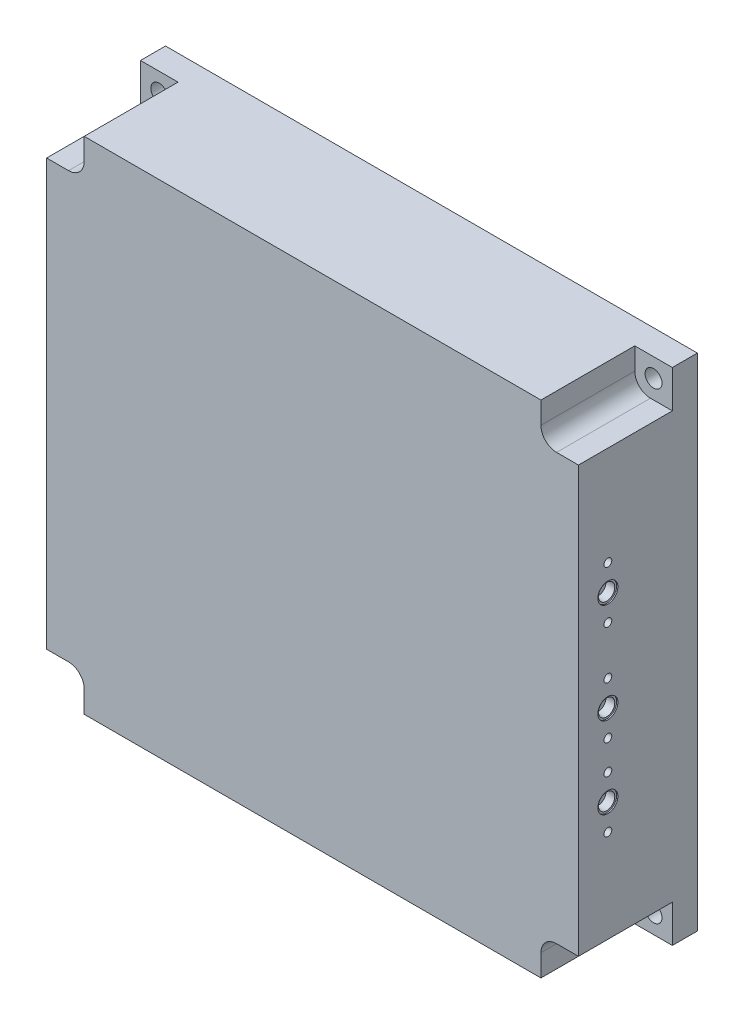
SolidWorks part; units mm, degrees
ref_plane "前视" through (0, 0, 0) normal (0, 0, 1) x (1, 0, 0)
ref_plane "上视" through (0, 0, 0) normal (0, 1, 0) x (1, 0, 0)
ref_plane "右视" through (0, 0, 0) normal (1, 0, 0) x (0, 0, -1)
sketch "草图1" plane through (0, 0, 0) normal (0, 0, 1) x (1, 0, 0)
  line L0 (100.0701, 138.3777) -> (98.0701, 138.3777)
  line L1 (98.0701, 125.6777) -> (100.0701, 125.6777)
  line L2 (98.0701, 134.1277) -> (93.0701, 134.1277)
  line L3 (93.0701, 129.9277) -> (98.0701, 129.9277)
  line L4 (187.0701, 122.3777) -> (185.0701, 122.3777)
  line L5 (185.0701, 109.6777) -> (187.0701, 109.6777)
  line L6 (187.0701, 113.9277) -> (192.0701, 113.9277)
  line L7 (192.0701, 118.1277) -> (187.0701, 118.1277)
  line L8 (100.0701, 109.3777) -> (98.0701, 109.3777)
  line L9 (98.0701, 96.6777) -> (100.0701, 96.6777)
  line L10 (98.0701, 105.1277) -> (93.0701, 105.1277)
  line L11 (93.0701, 100.9277) -> (98.0701, 100.9277)
  line L12 (187.0701, 109.3777) -> (185.0701, 109.3777)
  line L13 (185.0701, 96.6777) -> (187.0701, 96.6777)
  line L14 (187.0701, 100.9277) -> (192.0701, 100.9277)
  line L15 (192.0701, 105.1277) -> (187.0701, 105.1277)
  line L16 (187.0701, 138.3777) -> (185.0701, 138.3777)
  line L17 (185.0701, 125.6777) -> (187.0701, 125.6777)
  line L18 (187.0701, 129.9277) -> (192.0701, 129.9277)
  line L19 (192.0701, 134.1277) -> (187.0701, 134.1277)
  line L20 (172.2601, 70.7177) -> (172.2601, 75.6677)
  line L21 (158.5201, 75.6677) -> (158.5201, 70.7177)
  line L22 (98.0701, 137.7022) -> (100.0701, 137.7022)
  line L23 (98.0701, 137.7022) -> (98.0701, 138.3777)
  line L24 (100.0701, 126.3532) -> (98.0701, 126.3532)
  line L25 (98.0701, 125.6777) -> (98.0701, 126.3532)
  line L26 (98.0701, 126.3532) -> (98.0701, 137.7022)
  line L27 (93.0701, 134.1277) -> (93.0701, 129.9277)
  line L28 (185.0701, 121.7022) -> (187.0701, 121.7022)
  line L29 (187.0701, 122.3777) -> (187.0701, 121.7022)
  line L30 (187.0701, 110.3532) -> (185.0701, 110.3532)
  line L31 (187.0701, 121.7022) -> (187.0701, 110.3532)
  line L32 (187.0701, 110.3532) -> (187.0701, 109.6777)
  line L33 (192.0701, 116.0277) -> (192.0701, 118.1277)
  line L34 (192.0701, 113.9277) -> (192.0701, 116.0277)
  line L35 (100.0701, 97.3532) -> (98.0701, 97.3532)
  line L36 (98.0701, 97.3532) -> (98.0701, 108.7022)
  line L37 (98.0701, 108.7022) -> (100.0701, 108.7022)
  line L38 (98.0701, 108.7022) -> (98.0701, 109.3777)
  line L39 (98.0701, 96.6777) -> (98.0701, 97.3532)
  line L40 (93.0701, 105.1277) -> (93.0701, 100.9277)
  line L41 (185.0701, 108.7022) -> (187.0701, 108.7022)
  line L42 (187.0701, 108.7022) -> (187.0701, 97.3532)
  line L43 (187.0701, 97.3532) -> (185.0701, 97.3532)
  line L44 (187.0701, 109.3777) -> (187.0701, 108.7022)
  line L45 (187.0701, 97.3532) -> (187.0701, 96.6777)
  line L46 (192.0701, 103.0277) -> (192.0701, 105.1277)
  line L47 (192.0701, 100.9277) -> (192.0701, 103.0277)
  line L48 (185.0701, 137.7022) -> (187.0701, 137.7022)
  line L49 (187.0701, 138.3777) -> (187.0701, 137.7022)
  line L50 (187.0701, 126.3532) -> (185.0701, 126.3532)
  line L51 (187.0701, 126.3532) -> (187.0701, 125.6777)
  line L52 (187.0701, 137.7022) -> (187.0701, 126.3532)
  line L53 (192.0701, 132.0277) -> (192.0701, 134.1277)
  line L54 (192.0701, 129.9277) -> (192.0701, 132.0277)
  line L55 (155.7101, 75.6677) -> (175.0701, 75.6677)
  line L56 (155.7101, 75.6677) -> (155.7101, 78.0277)
  line L57 (175.0701, 78.0277) -> (175.0701, 75.6677)
  line L58 (153.7101, 78.0277) -> (153.7101, 75.6677)
  line L59 (153.7101, 75.6677) -> (155.7101, 75.6677)
  line L60 (177.0701, 75.6677) -> (177.0701, 78.0277)
  line L61 (175.0701, 75.6677) -> (177.0701, 75.6677)
  line L62 (169.7601, 70.7177) -> (172.2601, 70.7177)
  line L63 (169.7601, 75.6677) -> (169.7601, 70.7177)
  line L64 (161.0201, 70.7177) -> (161.0201, 75.6677)
  line L65 (158.5201, 70.7177) -> (161.0201, 70.7177)
  line L66 (169.7601, 70.7177) -> (161.0201, 70.7177)
  line L67 (155.3001, 71.2542) -> (155.3001, 75.6677)
  line L68 (157.3201, 71.2542) -> (157.3201, 75.6677)
  line L69 (154.2901, 71.7677) -> (154.5354, 71.7677)
  line L70 (154.2901, 75.6677) -> (154.2901, 71.7677)
  line L71 (154.5354, 70.9754) -> (154.7951, 70.8677)
  line L72 (154.5354, 71.7677) -> (154.5354, 70.9754)
  line L73 (157.8251, 70.8677) -> (158.0847, 70.9754)
  line L74 (158.3301, 71.7677) -> (158.3301, 75.6677)
  line L75 (158.0847, 71.7677) -> (158.3301, 71.7677)
  line L76 (158.0847, 70.9754) -> (158.0847, 71.7677)
  line L77 (157.8251, 70.8677) -> (156.3101, 70.8677)
  line L78 (156.3101, 70.8677) -> (154.7951, 70.8677)
  line L79 (158.007, 70.8677) -> (158.0847, 70.9754)
  line L80 (157.8251, 70.8677) -> (158.007, 70.8677)
  line L81 (154.5354, 70.9754) -> (154.6131, 70.8677)
  line L82 (154.6131, 70.8677) -> (154.7951, 70.8677)
  line L83 (172.4501, 71.7677) -> (172.6954, 71.7677)
  line L84 (172.4501, 75.6677) -> (172.4501, 71.7677)
  line L85 (173.4601, 71.2542) -> (173.4601, 75.6677)
  line L86 (172.6954, 70.9754) -> (172.9551, 70.8677)
  line L87 (172.6954, 71.7677) -> (172.6954, 70.9754)
  line L88 (175.9851, 70.8677) -> (176.2447, 70.9754)
  line L89 (175.4801, 71.2542) -> (175.4801, 75.6677)
  line L90 (176.4901, 71.7677) -> (176.4901, 75.6677)
  line L91 (176.2447, 71.7677) -> (176.4901, 71.7677)
  line L92 (176.2447, 70.9754) -> (176.2447, 71.7677)
  line L93 (175.9851, 70.8677) -> (174.4701, 70.8677)
  line L94 (174.4701, 70.8677) -> (172.9551, 70.8677)
  line L95 (176.167, 70.8677) -> (176.2447, 70.9754)
  line L96 (175.9851, 70.8677) -> (176.167, 70.8677)
  line L97 (172.6954, 70.9754) -> (172.7731, 70.8677)
  line L98 (172.7731, 70.8677) -> (172.9551, 70.8677)
  line L99 (179.0701, 158.0277) -> (106.0701, 158.0277)
  line L100 (100.0701, 152.0277) -> (100.0701, 84.0277)
  line L101 (185.0701, 84.0277) -> (181.5701, 84.0277)
  line L102 (106.0701, 78.0277) -> (179.0701, 78.0277)
  line L103 (106.0701, 78.0277) -> (106.0701, 81.5277)
  line L104 (181.5701, 152.0277) -> (185.0701, 152.0277)
  line L105 (179.0701, 78.0277) -> (179.0701, 81.5277)
  line L106 (100.0701, 152.0277) -> (103.5701, 152.0277)
  line L107 (185.0701, 84.0277) -> (185.0701, 152.0277)
  line L108 (103.5701, 84.0277) -> (100.0701, 84.0277)
  line L109 (106.0701, 154.5277) -> (106.0701, 158.0277)
  line L110 (179.0701, 158.0277) -> (179.0701, 154.5277)
  line L111 (185.0701, 158.0277) -> (179.0701, 158.0277)
  line L112 (185.0701, 152.0277) -> (185.0701, 158.0277)
  line L113 (179.0701, 78.0277) -> (185.0701, 78.0277)
  line L114 (185.0701, 78.0277) -> (185.0701, 84.0277)
  line L115 (100.0701, 84.0277) -> (100.0701, 78.0277)
  line L116 (100.0701, 78.0277) -> (106.0701, 78.0277)
  line L117 (106.0701, 158.0277) -> (100.0701, 158.0277)
  line L118 (100.0701, 158.0277) -> (100.0701, 152.0277)
  line L119 (47.0263, 121.7022) -> (47.0263, 110.3532)
  line L120 (52.7263, 110.3532) -> (52.7263, 121.7022)
  line L121 (47.0263, 108.7022) -> (47.0263, 97.3532)
  line L122 (52.7263, 97.3532) -> (52.7263, 108.7022)
  line L123 (47.0263, 137.7022) -> (47.0263, 126.3532)
  line L124 (52.7263, 126.3532) -> (52.7263, 137.7022)
  line L125 (55.7763, 75.6677) -> (55.7763, 78.0277)
  line L126 (53.7763, 75.6677) -> (55.7763, 75.6677)
  line L127 (53.7763, 78.0277) -> (53.7763, 75.6677)
  line L128 (50.1763, 75.6677) -> (50.1763, 78.0277)
  line L129 (50.1763, 75.6677) -> (53.7763, 75.6677)
  line L130 (48.1763, 78.0277) -> (48.1763, 75.6677)
  line L131 (48.1763, 75.6677) -> (50.1763, 75.6677)
  line L132 (48.8763, 75.6677) -> (48.8763, 70.7177)
  line L133 (48.8763, 70.7177) -> (52.6263, 70.7177)
  line L134 (53.8263, 75.6677) -> (53.8263, 70.7177)
  line L135 (52.6263, 70.7177) -> (53.8263, 70.7177)
  line L136 (55.0763, 70.7177) -> (55.0763, 75.6677)
  line L137 (53.8263, 70.7177) -> (55.0763, 70.7177)
  line L138 (51.9763, 71.7677) -> (52.4013, 71.7677)
  line L139 (51.9763, 71.7677) -> (51.9763, 75.6677)
  line L140 (53.7256, 71.2542) -> (53.7256, 75.6677)
  line L141 (52.4013, 70.9754) -> (52.851, 70.8677)
  line L142 (52.4013, 71.7677) -> (52.4013, 70.9754)
  line L143 (51.1016, 70.8677) -> (51.5513, 70.9754)
  line L144 (50.2269, 71.2542) -> (50.2269, 75.6677)
  line L145 (51.5513, 71.7677) -> (51.9763, 71.7677)
  line L146 (51.5513, 70.9754) -> (51.5513, 71.7677)
  line L147 (51.1016, 70.8677) -> (51.5513, 70.8677)
  line L148 (51.5513, 70.8677) -> (51.5513, 70.9754)
  line L149 (52.851, 70.8677) -> (52.4013, 70.8677)
  line L150 (52.4013, 70.9754) -> (52.4013, 70.8677)
  line L151 (53.7256, 70.8677) -> (52.851, 70.8677)
  line L152 (51.1016, 70.8677) -> (50.2269, 70.8677)
  line L153 (60.1763, 152.0277) -> (60.1763, 158.0277)
  line L154 (60.1763, 158.0277) -> (64.1763, 158.0277)
  line L155 (64.1763, 158.0277) -> (64.1763, 78.0277)
  line L156 (60.1763, 78.0277) -> (64.1763, 78.0277)
  line L157 (60.1763, 78.0277) -> (60.1763, 84.0277)
  line L158 (60.1763, 84.0277) -> (45.1763, 84.0277)
  line L159 (45.1763, 84.0277) -> (45.1763, 152.0277)
  line L160 (45.1763, 152.0277) -> (60.1763, 152.0277)
  line L161 (45.1763, 81.5277) -> (60.1763, 81.5277)
  line L162 (45.1763, 84.0277) -> (45.1763, 81.5277)
  line L163 (60.1763, 154.5277) -> (45.1763, 154.5277)
  line L164 (45.1763, 154.5277) -> (45.1763, 152.0277)
  line L165 (45.1763, 158.0277) -> (45.1763, 154.5277)
  line L166 (60.1763, 158.0277) -> (45.1763, 158.0277)
  line L167 (45.1763, 78.0277) -> (45.1763, 81.5277)
  line L168 (45.1763, 78.0277) -> (60.1763, 78.0277)
  line L169 (52.6263, 70.7177) -> (52.6263, 70.8677)
  line L170 (245.9633, 126.3532) -> (245.9633, 137.7022)
  line L171 (240.2633, 137.7022) -> (240.2633, 126.3532)
  line L172 (240.2633, 108.7022) -> (240.2633, 97.3532)
  line L173 (245.9633, 97.3532) -> (245.9633, 108.7022)
  line L174 (239.2133, 75.6677) -> (239.2133, 78.0277)
  line L175 (237.2133, 75.6677) -> (239.2133, 75.6677)
  line L176 (237.2133, 78.0277) -> (237.2133, 75.6677)
  line L177 (242.8133, 78.0277) -> (242.8133, 75.6677)
  line L178 (239.2133, 75.6677) -> (242.8133, 75.6677)
  line L179 (244.8133, 75.6677) -> (244.8133, 78.0277)
  line L180 (242.8133, 75.6677) -> (244.8133, 75.6677)
  line L181 (244.1133, 70.7177) -> (244.1133, 75.6677)
  line L182 (240.3633, 70.7177) -> (244.1133, 70.7177)
  line L183 (239.1633, 70.7177) -> (239.1633, 75.6677)
  line L184 (239.1633, 70.7177) -> (240.3633, 70.7177)
  line L185 (237.9133, 75.6677) -> (237.9133, 70.7177)
  line L186 (237.9133, 70.7177) -> (239.1633, 70.7177)
  line L187 (240.1386, 70.8677) -> (240.5883, 70.9754)
  line L188 (239.2639, 71.2542) -> (239.2639, 75.6677)
  line L189 (241.0133, 75.6677) -> (241.0133, 71.7677)
  line L190 (240.5883, 71.7677) -> (241.0133, 71.7677)
  line L191 (240.5883, 70.9754) -> (240.5883, 71.7677)
  line L192 (242.7626, 71.2542) -> (242.7626, 75.6677)
  line L193 (241.4383, 70.9754) -> (241.8879, 70.8677)
  line L194 (241.4383, 71.7677) -> (241.4383, 70.9754)
  line L195 (241.0133, 71.7677) -> (241.4383, 71.7677)
  line L196 (240.1386, 70.8677) -> (240.5883, 70.8677)
  line L197 (240.5883, 70.8677) -> (240.5883, 70.9754)
  line L198 (241.4383, 70.8677) -> (241.8879, 70.8677)
  line L199 (241.4383, 70.9754) -> (241.4383, 70.8677)
  line L200 (239.2639, 70.8677) -> (240.1386, 70.8677)
  line L201 (242.7626, 70.8677) -> (241.8879, 70.8677)
  line L202 (232.8133, 84.0277) -> (232.8133, 78.0277)
  line L203 (228.8133, 78.0277) -> (232.8133, 78.0277)
  line L204 (228.8133, 78.0277) -> (228.8133, 158.0277)
  line L205 (232.8133, 158.0277) -> (228.8133, 158.0277)
  line L206 (232.8133, 158.0277) -> (232.8133, 152.0277)
  line L207 (232.8133, 152.0277) -> (247.8133, 152.0277)
  line L208 (247.8133, 152.0277) -> (247.8133, 84.0277)
  line L209 (247.8133, 84.0277) -> (232.8133, 84.0277)
  line L210 (247.8133, 154.5277) -> (232.8133, 154.5277)
  line L211 (247.8133, 152.0277) -> (247.8133, 154.5277)
  line L212 (232.8133, 81.5277) -> (247.8133, 81.5277)
  line L213 (247.8133, 81.5277) -> (247.8133, 84.0277)
  line L214 (247.8133, 154.5277) -> (247.8133, 158.0277)
  line L215 (247.8133, 158.0277) -> (232.8133, 158.0277)
  line L216 (247.8133, 78.0277) -> (247.8133, 81.5277)
  line L217 (232.8133, 78.0277) -> (247.8133, 78.0277)
  line L218 (240.3633, 70.8677) -> (240.3633, 70.7177)
  line L219 (98.0701, 192.1775) -> (93.0701, 192.1775)
  line L220 (93.0701, 187.9775) -> (98.0701, 187.9775)
  line L221 (187.0701, 187.9775) -> (192.0701, 187.9775)
  line L222 (192.0701, 192.1775) -> (187.0701, 192.1775)
  line L223 (100.0701, 192.9275) -> (98.0701, 192.9275)
  line L224 (98.0701, 187.2275) -> (100.0701, 187.2275)
  line L225 (98.0701, 187.2275) -> (98.0701, 192.9275)
  line L226 (93.0701, 192.1775) -> (93.0701, 187.9775)
  line L227 (185.0701, 187.2275) -> (187.0701, 187.2275)
  line L228 (187.0701, 192.9275) -> (185.0701, 192.9275)
  line L229 (187.0701, 192.9275) -> (187.0701, 187.2275)
  line L230 (192.0701, 187.9775) -> (192.0701, 192.1775)
  line L231 (169.7601, 191.0775) -> (161.0201, 191.0775)
  line L232 (169.7601, 190.5775) -> (161.0201, 190.5775)
  line L233 (159.288, 187.5775) -> (159.9808, 186.3775)
  line L234 (161.7129, 185.3775) -> (169.0673, 185.3775)
  line L235 (170.7993, 186.3775) -> (171.4921, 187.5775)
  line L236 (171.9251, 187.3275) -> (171.2323, 186.1275)
  line L237 (159.5478, 186.1275) -> (158.855, 187.3275)
  line L238 (161.7129, 184.8775) -> (169.0673, 184.8775)
  line L239 (153.7101, 186.1775) -> (153.7101, 189.7775)
  line L240 (155.7101, 191.7775) -> (175.0701, 191.7775)
  line L241 (177.0701, 189.7775) -> (177.0701, 186.1775)
  line L242 (175.0701, 184.1775) -> (155.7101, 184.1775)
  line L243 (158.007, 188.4025) -> (158.0847, 188.4025)
  line L244 (157.8251, 188.8522) -> (158.0847, 188.4025)
  line L245 (154.6131, 187.5525) -> (154.5354, 187.5525)
  line L246 (154.7951, 187.1028) -> (154.5354, 187.5525)
  line L247 (158.007, 187.5525) -> (156.9878, 187.5525)
  line L248 (155.6323, 187.5525) -> (154.6131, 187.5525)
  line L249 (156.9878, 188.4025) -> (158.007, 188.4025)
  line L250 (154.6131, 188.4025) -> (155.6323, 188.4025)
  line L251 (154.5354, 188.4025) -> (154.6131, 188.4025)
  line L252 (154.5354, 188.4025) -> (154.7951, 188.8522)
  line L253 (158.0847, 187.5525) -> (158.007, 187.5525)
  line L254 (158.0847, 187.5525) -> (157.8251, 187.1028)
  line L255 (158.3301, 187.9775) -> (158.0847, 187.5525)
  line L256 (158.0847, 188.4025) -> (158.3301, 187.9775)
  line L257 (154.2901, 187.9775) -> (154.5354, 188.4025)
  line L258 (154.5354, 187.5525) -> (154.2901, 187.9775)
  line L259 (176.167, 188.4025) -> (176.2447, 188.4025)
  line L260 (175.9851, 188.8522) -> (176.2447, 188.4025)
  line L261 (172.7731, 187.5525) -> (172.6954, 187.5525)
  line L262 (172.9551, 187.1028) -> (172.6954, 187.5525)
  line L263 (176.167, 187.5525) -> (175.1478, 187.5525)
  line L264 (173.7923, 187.5525) -> (172.7731, 187.5525)
  line L265 (175.1478, 188.4025) -> (176.167, 188.4025)
  line L266 (172.7731, 188.4025) -> (173.7923, 188.4025)
  line L267 (172.6954, 188.4025) -> (172.7731, 188.4025)
  line L268 (172.6954, 188.4025) -> (172.9551, 188.8522)
  line L269 (176.2447, 187.5525) -> (176.167, 187.5525)
  line L270 (176.2447, 187.5525) -> (175.9851, 187.1028)
  line L271 (176.4901, 187.9775) -> (176.2447, 187.5525)
  line L272 (176.2447, 188.4025) -> (176.4901, 187.9775)
  line L273 (172.4501, 187.9775) -> (172.6954, 188.4025)
  line L274 (172.6954, 187.5525) -> (172.4501, 187.9775)
  line L275 (179.0701, 179.7775) -> (185.0701, 179.7775)
  line L276 (185.0701, 179.7775) -> (185.0701, 175.7775)
  line L277 (185.0701, 175.7775) -> (100.0701, 175.7775)
  line L278 (100.0701, 175.7775) -> (100.0701, 179.7775)
  line L279 (100.0701, 179.7775) -> (106.0701, 179.7775)
  line L280 (106.0701, 179.7775) -> (106.0701, 194.7775)
  line L281 (106.0701, 194.7775) -> (179.0701, 194.7775)
  line L282 (179.0701, 194.7775) -> (179.0701, 179.7775)
  line L283 (103.5701, 194.7775) -> (103.5701, 179.7775)
  line L284 (106.0701, 194.7775) -> (103.5701, 194.7775)
  line L285 (181.5701, 179.7775) -> (181.5701, 194.7775)
  line L286 (181.5701, 194.7775) -> (179.0701, 194.7775)
  line L287 (103.5701, 194.7775) -> (100.0701, 194.7775)
  line L288 (100.0701, 194.7775) -> (100.0701, 179.7775)
  line L289 (185.0701, 194.7775) -> (181.5701, 194.7775)
  line L290 (185.0701, 179.7775) -> (185.0701, 194.7775)
  line L291 (98.0701, 38.4347) -> (93.0701, 38.4347)
  line L292 (93.0701, 34.2347) -> (98.0701, 34.2347)
  line L293 (187.0701, 34.2347) -> (192.0701, 34.2347)
  line L294 (192.0701, 38.4347) -> (187.0701, 38.4347)
  line L295 (100.0701, 39.1847) -> (98.0701, 39.1847)
  line L296 (98.0701, 33.4847) -> (100.0701, 33.4847)
  line L297 (98.0701, 33.4847) -> (98.0701, 39.1847)
  line L298 (93.0701, 38.4347) -> (93.0701, 34.2347)
  line L299 (185.0701, 33.4847) -> (187.0701, 33.4847)
  line L300 (187.0701, 39.1847) -> (185.0701, 39.1847)
  line L301 (187.0701, 39.1847) -> (187.0701, 33.4847)
  line L302 (192.0701, 34.2347) -> (192.0701, 38.4347)
  line L303 (179.0701, 31.6347) -> (106.0701, 31.6347)
  line L304 (106.0701, 31.6347) -> (106.0701, 46.6347)
  line L305 (106.0701, 46.6347) -> (100.0701, 46.6347)
  line L306 (100.0701, 46.6347) -> (100.0701, 50.6347)
  line L307 (100.0701, 50.6347) -> (185.0701, 50.6347)
  line L308 (185.0701, 46.6347) -> (185.0701, 50.6347)
  line L309 (185.0701, 46.6347) -> (179.0701, 46.6347)
  line L310 (179.0701, 46.6347) -> (179.0701, 31.6347)
  line L311 (181.5701, 31.6347) -> (181.5701, 46.6347)
  line L312 (179.0701, 31.6347) -> (181.5701, 31.6347)
  line L313 (103.5701, 46.6347) -> (103.5701, 31.6347)
  line L314 (103.5701, 31.6347) -> (106.0701, 31.6347)
  line L315 (181.5701, 31.6347) -> (185.0701, 31.6347)
  line L316 (185.0701, 31.6347) -> (185.0701, 46.6347)
  line L317 (100.0701, 31.6347) -> (103.5701, 31.6347)
  line L318 (100.0701, 46.6347) -> (100.0701, 31.6347)
  line L319 (362.8161, 138.3777) -> (360.8161, 138.3777)
  line L320 (360.8161, 125.6777) -> (362.8161, 125.6777)
  line L321 (362.8161, 129.9277) -> (367.8161, 129.9277)
  line L322 (367.8161, 134.1277) -> (362.8161, 134.1277)
  line L323 (275.8161, 122.3777) -> (273.8161, 122.3777)
  line L324 (273.8161, 109.6777) -> (275.8161, 109.6777)
  line L325 (273.8161, 118.1277) -> (268.8161, 118.1277)
  line L326 (268.8161, 113.9277) -> (273.8161, 113.9277)
  line L327 (362.8161, 109.3777) -> (360.8161, 109.3777)
  line L328 (360.8161, 96.6777) -> (362.8161, 96.6777)
  line L329 (362.8161, 100.9277) -> (367.8161, 100.9277)
  line L330 (367.8161, 105.1277) -> (362.8161, 105.1277)
  line L331 (275.8161, 109.3777) -> (273.8161, 109.3777)
  line L332 (273.8161, 96.6777) -> (275.8161, 96.6777)
  line L333 (273.8161, 105.1277) -> (268.8161, 105.1277)
  line L334 (268.8161, 100.9277) -> (273.8161, 100.9277)
  line L335 (273.8161, 125.6777) -> (275.8161, 125.6777)
  line L336 (275.8161, 138.3777) -> (273.8161, 138.3777)
  line L337 (273.8161, 134.1277) -> (268.8161, 134.1277)
  line L338 (268.8161, 129.9277) -> (273.8161, 129.9277)
  line L339 (302.3661, 70.7177) -> (302.3661, 75.6677)
  line L340 (288.6261, 75.6677) -> (288.6261, 70.7177)
  line L341 (360.8161, 137.7022) -> (362.8161, 137.7022)
  line L342 (362.8161, 138.3777) -> (362.8161, 137.7022)
  line L343 (362.8161, 126.3532) -> (360.8161, 126.3532)
  line L344 (362.8161, 137.7022) -> (362.8161, 126.3532)
  line L345 (362.8161, 126.3532) -> (362.8161, 125.6777)
  line L346 (367.8161, 132.0277) -> (367.8161, 134.1277)
  line L347 (367.8161, 129.9277) -> (367.8161, 132.0277)
  line L348 (273.8161, 121.7022) -> (275.8161, 121.7022)
  line L349 (273.8161, 121.7022) -> (273.8161, 122.3777)
  line L350 (275.8161, 110.3532) -> (273.8161, 110.3532)
  line L351 (273.8161, 109.6777) -> (273.8161, 110.3532)
  line L352 (273.8161, 110.3532) -> (273.8161, 121.7022)
  line L353 (268.8161, 118.1277) -> (268.8161, 113.9277)
  line L354 (360.8161, 108.7022) -> (362.8161, 108.7022)
  line L355 (362.8161, 109.3777) -> (362.8161, 108.7022)
  line L356 (362.8161, 97.3532) -> (360.8161, 97.3532)
  line L357 (362.8161, 108.7022) -> (362.8161, 97.3532)
  line L358 (362.8161, 97.3532) -> (362.8161, 96.6777)
  line L359 (367.8161, 103.0277) -> (367.8161, 105.1277)
  line L360 (367.8161, 100.9277) -> (367.8161, 103.0277)
  line L361 (273.8161, 108.7022) -> (275.8161, 108.7022)
  line L362 (273.8161, 108.7022) -> (273.8161, 109.3777)
  line L363 (275.8161, 97.3532) -> (273.8161, 97.3532)
  line L364 (273.8161, 97.3532) -> (273.8161, 108.7022)
  line L365 (273.8161, 96.6777) -> (273.8161, 97.3532)
  line L366 (268.8161, 105.1277) -> (268.8161, 100.9277)
  line L367 (275.8161, 126.3532) -> (273.8161, 126.3532)
  line L368 (273.8161, 125.6777) -> (273.8161, 126.3532)
  line L369 (273.8161, 137.7022) -> (275.8161, 137.7022)
  line L370 (273.8161, 137.7022) -> (273.8161, 138.3777)
  line L371 (273.8161, 126.3532) -> (273.8161, 137.7022)
  line L372 (268.8161, 134.1277) -> (268.8161, 129.9277)
  line L373 (285.8161, 75.6677) -> (285.8161, 78.0277)
  line L374 (305.1761, 78.0277) -> (305.1761, 75.6677)
  line L375 (285.8161, 75.6677) -> (305.1761, 75.6677)
  line L376 (283.8161, 78.0277) -> (283.8161, 75.6677)
  line L377 (283.8161, 75.6677) -> (285.8161, 75.6677)
  line L378 (307.1761, 75.6677) -> (307.1761, 78.0277)
  line L379 (305.1761, 75.6677) -> (307.1761, 75.6677)
  line L380 (291.8189, 70.7177) -> (291.8189, 75.6677)
  line L381 (299.1733, 75.6677) -> (299.1733, 70.7177)
  line L382 (299.1733, 70.7177) -> (291.8189, 70.7177)
  line L383 (301.3384, 70.7177) -> (301.3384, 75.6677)
  line L384 (299.1733, 70.7177) -> (301.3384, 70.7177)
  line L385 (289.6539, 75.6677) -> (289.6539, 70.7177)
  line L386 (289.6539, 70.7177) -> (291.8189, 70.7177)
  line L387 (302.0312, 75.6677) -> (302.0312, 70.7177)
  line L388 (301.3384, 70.7177) -> (302.0312, 70.7177)
  line L389 (288.9611, 70.7177) -> (288.9611, 75.6677)
  line L390 (288.9611, 70.7177) -> (289.6539, 70.7177)
  line L391 (302.0312, 70.7177) -> (302.3661, 70.7177)
  line L392 (288.6261, 70.7177) -> (288.9611, 70.7177)
  line L393 (306.0911, 70.8677) -> (306.3508, 70.9754)
  line L394 (305.5861, 71.2542) -> (305.5861, 75.6677)
  line L395 (306.5961, 75.6677) -> (306.5961, 71.7677)
  line L396 (306.3508, 71.7677) -> (306.5961, 71.7677)
  line L397 (306.3508, 70.9754) -> (306.3508, 71.7677)
  line L398 (302.5561, 71.7677) -> (302.8015, 71.7677)
  line L399 (302.5561, 71.7677) -> (302.5561, 75.6677)
  line L400 (303.5661, 71.2542) -> (303.5661, 75.6677)
  line L401 (302.8015, 70.9754) -> (303.0611, 70.8677)
  line L402 (302.8015, 71.7677) -> (302.8015, 70.9754)
  line L403 (304.5761, 70.8677) -> (306.0911, 70.8677)
  line L404 (304.5761, 70.8677) -> (303.0611, 70.8677)
  line L405 (306.2731, 70.8677) -> (306.3508, 70.9754)
  line L406 (306.0911, 70.8677) -> (306.2731, 70.8677)
  line L407 (302.8015, 70.9754) -> (302.8792, 70.8677)
  line L408 (303.0611, 70.8677) -> (302.8792, 70.8677)
  line L409 (285.4061, 71.2542) -> (285.4061, 75.6677)
  line L410 (287.4261, 71.2542) -> (287.4261, 75.6677)
  line L411 (287.9311, 70.8677) -> (288.1908, 70.9754)
  line L412 (288.4361, 75.6677) -> (288.4361, 71.7677)
  line L413 (288.1908, 71.7677) -> (288.4361, 71.7677)
  line L414 (288.1908, 70.9754) -> (288.1908, 71.7677)
  line L415 (284.3961, 71.7677) -> (284.6415, 71.7677)
  line L416 (284.3961, 71.7677) -> (284.3961, 75.6677)
  line L417 (284.6415, 70.9754) -> (284.9011, 70.8677)
  line L418 (284.6415, 71.7677) -> (284.6415, 70.9754)
  line L419 (286.4161, 70.8677) -> (287.9311, 70.8677)
  line L420 (286.4161, 70.8677) -> (284.9011, 70.8677)
  line L421 (288.1131, 70.8677) -> (288.1908, 70.9754)
  line L422 (287.9311, 70.8677) -> (288.1131, 70.8677)
  line L423 (284.6415, 70.9754) -> (284.7192, 70.8677)
  line L424 (284.9011, 70.8677) -> (284.7192, 70.8677)
  line L425 (360.8161, 158.0277) -> (275.8161, 158.0277)
  line L426 (360.8161, 78.0277) -> (360.8161, 158.0277)
  line L427 (275.8161, 78.0277) -> (360.8161, 78.0277)
  line L428 (275.8161, 158.0277) -> (275.8161, 78.0277)
  line L429 (275.8161, 158.0277) -> (275.8161, 78.0277)
  line L430 (360.8161, 158.0277) -> (275.8161, 158.0277)
  line L431 (352.3161, 157.0277) -> (284.3161, 157.0277)
  line L432 (351.3161, 154.0277) -> (285.3161, 154.0277)
  line L433 (358.3161, 151.0277) -> (353.8161, 151.0277)
  line L434 (354.1161, 150.0277) -> (352.8161, 150.0277)
  line L435 (275.8161, 78.0277) -> (360.8161, 78.0277)
  line L436 (284.3161, 79.0277) -> (352.3161, 79.0277)
  line L437 (287.6161, 82.0277) -> (349.0161, 82.0277)
  line L438 (359.8161, 143.2277) -> (359.8161, 149.5277)
  line L439 (353.8161, 151.0277) -> (353.8161, 155.5277)
  line L440 (352.8161, 150.0277) -> (352.8161, 152.5277)
  line L441 (276.8161, 143.2277) -> (276.8161, 149.5277)
  line L442 (359.8161, 92.8277) -> (359.8161, 86.5277)
  line L443 (276.8161, 92.8277) -> (276.8161, 86.5277)
  line L444 (278.3161, 151.0277) -> (282.8161, 151.0277)
  line L445 (282.5161, 150.0277) -> (283.8161, 150.0277)
  line L446 (282.8161, 151.0277) -> (282.8161, 155.5277)
  line L447 (283.8161, 150.0277) -> (283.8161, 152.5277)
  line L448 (358.3161, 85.0277) -> (353.8161, 85.0277)
  line L449 (354.1161, 86.0277) -> (352.8161, 86.0277)
  line L450 (353.8161, 85.0277) -> (353.8161, 80.5277)
  line L451 (352.8161, 86.0277) -> (352.8161, 83.5277)
  line L452 (278.3161, 85.0277) -> (282.8161, 85.0277)
  line L453 (283.0161, 86.0277) -> (283.8161, 86.0277)
  line L454 (282.8161, 85.0277) -> (282.8161, 80.5277)
  line L455 (283.8161, 86.0277) -> (283.8161, 83.5277)
  line L456 (307.3161, 78.0277) -> (283.8161, 78.0277)
  line L457 (278.0161, 143.2277) -> (275.8161, 143.2277)
  line L458 (278.0161, 92.8277) -> (275.8161, 92.8277)
  line L459 (358.6161, 92.8277) -> (360.8161, 92.8277)
  line L460 (358.6161, 143.2277) -> (360.8161, 143.2277)
  line L461 (285.6161, 95.8277) -> (285.6161, 84.0277)
  line L462 (281.0161, 95.8277) -> (281.0161, 92.8277)
  line L463 (283.0161, 97.8277) -> (283.6161, 97.8277)
  line L464 (351.0161, 95.8277) -> (351.0161, 84.0277)
  line L465 (353.6161, 97.8277) -> (353.0161, 97.8277)
  line L466 (287.6161, 82.0277) -> (285.3161, 82.0277)
  line L467 (282.5161, 86.0277) -> (283.0161, 86.0277)
  line L468 (351.3161, 82.0277) -> (349.0161, 82.0277)
  line L469 (285.6161, 140.2277) -> (285.6161, 152.0277)
  line L470 (283.0161, 138.2277) -> (283.6161, 138.2277)
  line L471 (351.0161, 140.2277) -> (351.0161, 152.0277)
  line L472 (353.6161, 138.2277) -> (353.0161, 138.2277)
  line L473 (355.6161, 95.8277) -> (355.6161, 92.8277)
  line L474 (281.0161, 140.2277) -> (281.0161, 143.2277)
  line L475 (355.6161, 140.2277) -> (355.6161, 143.2277)
  line L476 (281.0161, 143.2277) -> (281.0161, 148.5277)
  line L477 (355.6161, 143.2288) -> (355.6161, 148.5277)
  line L478 (355.6161, 93.0277) -> (355.6161, 87.5277)
  line L479 (281.0161, 92.8277) -> (281.0161, 87.5277)
  line L480 (360.8161, 158.0277) -> (360.8161, 78.0277)
  line L481 (477.7232, 151.3741) -> (477.7232, 155.9241)
  line L482 (476.2732, 157.3741) -> (408.2732, 157.3741)
  line L483 (406.8232, 155.9241) -> (406.8232, 151.3741)
  line L484 (406.8232, 151.3741) -> (402.2732, 151.3741)
  line L485 (400.8232, 149.9241) -> (400.8232, 86.9241)
  line L486 (402.2732, 85.4741) -> (406.8232, 85.4741)
  line L487 (406.8232, 85.4741) -> (406.8232, 80.9241)
  line L488 (408.2732, 79.4741) -> (476.2732, 79.4741)
  line L489 (477.7232, 80.9241) -> (477.7232, 85.4741)
  line L490 (477.7232, 85.4741) -> (482.2732, 85.4741)
  line L491 (483.7232, 86.9241) -> (483.7232, 149.9241)
  line L492 (482.2732, 151.3741) -> (477.7232, 151.3741)
  arc A0 (181.5701, 84.0277) -> (179.0701, 81.5277) centre (181.5701, 81.5277) ccw
  arc A1 (106.0701, 81.5277) -> (103.5701, 84.0277) centre (103.5701, 81.5277) ccw
  arc A2 (103.5701, 152.0277) -> (106.0701, 154.5277) centre (103.5701, 154.5277) ccw
  arc A3 (179.0701, 154.5277) -> (181.5701, 152.0277) centre (181.5701, 154.5277) ccw
  circle A4 centre (182.0701, 155.0277) radius 1.35
  circle A5 centre (182.0701, 81.0277) radius 1.35
  circle A6 centre (103.0701, 81.0277) radius 1.35
  circle A7 centre (103.0701, 155.0277) radius 1.35
  circle A8 centre (49.8763, 116.0277) radius 1.6
  circle A9 centre (49.8763, 116.0277) radius 2.1
  circle A10 centre (49.8763, 116.0277) radius 0.25
  circle A11 centre (49.8763, 111.8777) radius 1.1
  circle A12 centre (49.8763, 120.1777) radius 1.1
  arc A13 (52.7263, 121.7022) -> (47.0263, 121.7022) centre (49.8763, 116.0277) ccw
  arc A14 (47.0263, 110.3532) -> (52.7263, 110.3532) centre (49.8763, 116.0277) ccw
  circle A15 centre (49.8763, 103.0277) radius 1.6
  circle A16 centre (49.8763, 103.0277) radius 2.1
  circle A17 centre (49.8763, 103.0277) radius 0.25
  circle A18 centre (49.8763, 98.8777) radius 1.1
  circle A19 centre (49.8763, 107.1777) radius 1.1
  arc A20 (52.7263, 108.7022) -> (47.0263, 108.7022) centre (49.8763, 103.0277) ccw
  arc A21 (47.0263, 97.3532) -> (52.7263, 97.3532) centre (49.8763, 103.0277) ccw
  circle A22 centre (49.8763, 132.0277) radius 2.1
  circle A23 centre (49.8763, 132.0277) radius 1.6
  circle A24 centre (49.8763, 132.0277) radius 0.25
  circle A25 centre (49.8763, 127.8777) radius 1.1
  circle A26 centre (49.8763, 136.1777) radius 1.1
  arc A27 (52.7263, 137.7022) -> (47.0263, 137.7022) centre (49.8763, 132.0277) ccw
  arc A28 (47.0263, 126.3532) -> (52.7263, 126.3532) centre (49.8763, 132.0277) ccw
  circle A29 centre (49.8763, 107.1777) radius 0.8
  circle A30 centre (49.8763, 98.8777) radius 0.8
  circle A31 centre (49.8763, 120.1777) radius 0.8
  circle A32 centre (49.8763, 111.8777) radius 0.8
  circle A33 centre (49.8763, 136.1777) radius 0.8
  circle A34 centre (49.8763, 127.8777) radius 0.8
  circle A35 centre (243.1133, 132.0277) radius 2.1
  circle A36 centre (243.1133, 132.0277) radius 1.6
  circle A37 centre (243.1133, 132.0277) radius 0.25
  circle A38 centre (243.1133, 127.8777) radius 1.1
  circle A39 centre (243.1133, 136.1777) radius 1.1
  arc A40 (240.2633, 126.3532) -> (245.9633, 126.3532) centre (243.1133, 132.0277) ccw
  arc A41 (245.9633, 137.7022) -> (240.2633, 137.7022) centre (243.1133, 132.0277) ccw
  circle A42 centre (243.1133, 103.0277) radius 2.1
  circle A43 centre (243.1133, 103.0277) radius 1.6
  circle A44 centre (243.1133, 103.0277) radius 0.25
  circle A45 centre (243.1133, 98.8777) radius 1.1
  circle A46 centre (243.1133, 107.1777) radius 1.1
  arc A47 (240.2633, 97.3532) -> (245.9633, 97.3532) centre (243.1133, 103.0277) ccw
  arc A48 (245.9633, 108.7022) -> (240.2633, 108.7022) centre (243.1133, 103.0277) ccw
  circle A49 centre (243.1133, 107.1777) radius 0.8
  circle A50 centre (243.1133, 98.8777) radius 0.8
  circle A51 centre (243.1133, 136.1777) radius 0.8
  circle A52 centre (243.1133, 127.8777) radius 0.8
  arc A53 (171.9251, 187.3275) -> (169.7601, 191.0775) centre (169.7601, 188.5775) ccw
  arc A54 (159.5478, 186.1275) -> (161.7129, 184.8775) centre (161.7129, 187.3775) ccw
  arc A55 (161.0201, 191.0775) -> (158.855, 187.3275) centre (161.0201, 188.5775) ccw
  arc A56 (171.4921, 187.5775) -> (169.7601, 190.5775) centre (169.7601, 188.5775) ccw
  arc A57 (161.0201, 190.5775) -> (159.288, 187.5775) centre (161.0201, 188.5775) ccw
  arc A58 (159.9808, 186.3775) -> (161.7129, 185.3775) centre (161.7129, 187.3775) ccw
  arc A59 (169.0673, 184.8775) -> (171.2323, 186.1275) centre (169.0673, 187.3775) ccw
  arc A60 (169.0673, 185.3775) -> (170.7993, 186.3775) centre (169.0673, 187.3775) ccw
  circle A61 centre (161.5801, 186.9775) radius 0.25
  circle A62 centre (161.5801, 186.9775) radius 0.35
  circle A63 centre (162.8501, 186.9775) radius 0.25
  circle A64 centre (162.8501, 186.9775) radius 0.35
  circle A65 centre (164.1201, 186.9775) radius 0.25
  circle A66 centre (164.1201, 186.9775) radius 0.35
  circle A67 centre (165.3901, 186.9775) radius 0.25
  circle A68 centre (165.3901, 186.9775) radius 0.35
  circle A69 centre (166.6601, 186.9775) radius 0.25
  circle A70 centre (166.6601, 186.9775) radius 0.35
  circle A71 centre (167.9301, 186.9775) radius 0.25
  circle A72 centre (167.9301, 186.9775) radius 0.35
  circle A73 centre (169.2001, 186.9775) radius 0.25
  circle A74 centre (169.2001, 186.9775) radius 0.35
  circle A75 centre (169.8351, 188.9775) radius 0.25
  circle A76 centre (169.8351, 188.9775) radius 0.35
  circle A77 centre (166.0251, 188.9775) radius 0.25
  circle A78 centre (166.0251, 188.9775) radius 0.35
  circle A79 centre (167.2951, 188.9775) radius 0.25
  circle A80 centre (167.2951, 188.9775) radius 0.35
  circle A81 centre (168.5651, 188.9775) radius 0.25
  circle A82 centre (168.5651, 188.9775) radius 0.35
  circle A83 centre (160.9451, 188.9775) radius 0.25
  circle A84 centre (160.9451, 188.9775) radius 0.35
  circle A85 centre (162.2151, 188.9775) radius 0.25
  circle A86 centre (162.2151, 188.9775) radius 0.35
  circle A87 centre (163.4851, 188.9775) radius 0.25
  circle A88 centre (163.4851, 188.9775) radius 0.35
  circle A89 centre (164.7551, 188.9775) radius 0.25
  circle A90 centre (164.7551, 188.9775) radius 0.35
  arc A91 (155.7101, 191.7775) -> (153.7101, 189.7775) centre (155.7101, 189.7775) ccw
  arc A92 (177.0701, 189.7775) -> (175.0701, 191.7775) centre (175.0701, 189.7775) ccw
  arc A93 (175.0701, 184.1775) -> (177.0701, 186.1775) centre (175.0701, 186.1775) ccw
  arc A94 (153.7101, 186.1775) -> (155.7101, 184.1775) centre (155.7101, 186.1775) ccw
  arc A95 (158.007, 188.4025) -> (157.8251, 188.8522) centre (156.3101, 187.9775) ccw
  arc A96 (154.6131, 187.5525) -> (154.7951, 187.1028) centre (156.3101, 187.9775) ccw
  arc A97 (154.7951, 187.1028) -> (156.3101, 186.2282) centre (156.3101, 187.9775) ccw
  arc A98 (157.8251, 188.8522) -> (156.3101, 189.7269) centre (156.3101, 187.9775) ccw
  arc A99 (155.6323, 187.5525) -> (156.9878, 187.5525) centre (156.3101, 187.9775) ccw
  arc A100 (157.8251, 187.1028) -> (158.007, 187.5525) centre (156.3101, 187.9775) ccw
  arc A101 (156.3101, 186.2282) -> (157.8251, 187.1028) centre (156.3101, 187.9775) ccw
  arc A102 (154.7951, 188.8522) -> (154.6131, 188.4025) centre (156.3101, 187.9775) ccw
  arc A103 (156.3101, 189.7269) -> (154.7951, 188.8522) centre (156.3101, 187.9775) ccw
  arc A104 (156.9878, 188.4025) -> (155.6323, 188.4025) centre (156.3101, 187.9775) ccw
  arc A105 (156.9878, 187.5525) -> (156.9878, 188.4025) centre (156.3101, 187.9775) ccw
  arc A106 (155.6323, 188.4025) -> (155.6323, 187.5525) centre (156.3101, 187.9775) ccw
  arc A107 (176.167, 188.4025) -> (175.9851, 188.8522) centre (174.4701, 187.9775) ccw
  arc A108 (172.7731, 187.5525) -> (172.9551, 187.1028) centre (174.4701, 187.9775) ccw
  arc A109 (172.9551, 187.1028) -> (174.4701, 186.2282) centre (174.4701, 187.9775) ccw
  arc A110 (175.9851, 188.8522) -> (174.4701, 189.7269) centre (174.4701, 187.9775) ccw
  arc A111 (173.7923, 187.5525) -> (175.1478, 187.5525) centre (174.4701, 187.9775) ccw
  arc A112 (175.9851, 187.1028) -> (176.167, 187.5525) centre (174.4701, 187.9775) ccw
  arc A113 (174.4701, 186.2282) -> (175.9851, 187.1028) centre (174.4701, 187.9775) ccw
  arc A114 (172.9551, 188.8522) -> (172.7731, 188.4025) centre (174.4701, 187.9775) ccw
  arc A115 (174.4701, 189.7269) -> (172.9551, 188.8522) centre (174.4701, 187.9775) ccw
  arc A116 (175.1478, 188.4025) -> (173.7923, 188.4025) centre (174.4701, 187.9775) ccw
  arc A117 (175.1478, 187.5525) -> (175.1478, 188.4025) centre (174.4701, 187.9775) ccw
  arc A118 (173.7923, 188.4025) -> (173.7923, 187.5525) centre (174.4701, 187.9775) ccw
  circle A119 centre (278.8161, 155.0277) radius 1.35
  circle A120 centre (357.8161, 81.0277) radius 1.35
  circle A121 centre (278.8161, 81.0277) radius 1.35
  circle A122 centre (357.8161, 155.0277) radius 1.35
  arc A123 (353.8161, 155.5277) -> (352.3161, 157.0277) centre (352.3161, 155.5277) ccw
  arc A124 (352.8161, 152.5277) -> (351.3161, 154.0277) centre (351.3161, 152.5277) ccw
  arc A125 (352.3161, 79.0277) -> (353.8161, 80.5277) centre (352.3161, 80.5277) ccw
  arc A126 (349.0161, 82.0277) -> (351.0161, 84.0277) centre (349.0161, 84.0277) ccw
  arc A127 (285.6161, 84.0277) -> (287.6161, 82.0277) centre (287.6161, 84.0277) ccw
  arc A128 (283.8161, 83.5277) -> (285.3161, 82.0277) centre (285.3161, 83.5277) ccw
  arc A129 (359.8161, 149.5277) -> (358.3161, 151.0277) centre (358.3161, 149.5277) ccw
  arc A130 (278.3161, 151.0277) -> (276.8161, 149.5277) centre (278.3161, 149.5277) ccw
  arc A131 (276.8161, 86.5277) -> (278.3161, 85.0277) centre (278.3161, 86.5277) ccw
  circle A132 centre (357.8161, 155.0277) radius 1.35
  arc A133 (282.5161, 150.0277) -> (281.0161, 148.5277) centre (282.5161, 148.5277) ccw
  arc A134 (285.3161, 154.0277) -> (283.8161, 152.5277) centre (285.3161, 152.5277) ccw
  arc A135 (284.3161, 157.0277) -> (282.8161, 155.5277) centre (284.3161, 155.5277) ccw
  circle A136 centre (278.8161, 155.0277) radius 1.35
  arc A137 (358.3161, 85.0277) -> (359.8161, 86.5277) centre (358.3161, 86.5277) ccw
  arc A138 (351.3161, 82.0277) -> (352.8161, 83.5277) centre (351.3161, 83.5277) ccw
  circle A139 centre (357.8161, 81.0277) radius 1.35
  arc A140 (282.8161, 80.5277) -> (284.3161, 79.0277) centre (284.3161, 80.5277) ccw
  circle A141 centre (278.8161, 81.0277) radius 1.35
  arc A142 (354.2821, 140.2688) -> (353.5749, 139.5617) centre (353.3161, 140.5277) ccw
  circle A143 centre (353.3161, 140.5277) radius 0.7
  arc A144 (284.2821, 140.2688) -> (283.5749, 139.5617) centre (283.3161, 140.5277) ccw
  circle A145 centre (283.3161, 140.5277) radius 0.7
  arc A146 (354.2821, 95.2688) -> (353.5749, 94.5617) centre (353.3161, 95.5277) ccw
  circle A147 centre (353.3161, 95.5277) radius 0.7
  arc A148 (284.2821, 95.2688) -> (283.5749, 94.5617) centre (283.3161, 95.5277) ccw
  circle A149 centre (283.3161, 95.5277) radius 0.7
  arc A150 (285.6161, 95.8277) -> (283.6161, 97.8277) centre (283.6161, 95.8277) ccw
  arc A151 (283.0161, 97.8277) -> (281.0161, 95.8277) centre (283.0161, 95.8277) ccw
  arc A152 (353.0161, 97.8277) -> (351.0161, 95.8277) centre (353.0161, 95.8277) ccw
  arc A153 (355.6161, 95.8277) -> (353.6161, 97.8277) centre (353.6161, 95.8277) ccw
  arc A154 (351.0161, 152.0277) -> (349.0161, 154.0277) centre (349.0161, 152.0277) ccw
  arc A155 (287.6161, 154.0277) -> (285.6161, 152.0277) centre (287.6161, 152.0277) ccw
  arc A156 (283.6161, 138.2277) -> (285.6161, 140.2277) centre (283.6161, 140.2277) ccw
  arc A157 (281.0161, 140.2277) -> (283.0161, 138.2277) centre (283.0161, 140.2277) ccw
  arc A158 (351.0161, 140.2277) -> (353.0161, 138.2277) centre (353.0161, 140.2277) ccw
  arc A159 (353.6161, 138.2277) -> (355.6161, 140.2277) centre (353.6161, 140.2277) ccw
  arc A160 (278.0161, 92.8277) -> (281.0161, 92.8277) centre (279.5161, 92.8271) ccw
  arc A161 (355.6161, 92.8277) -> (358.6161, 92.8277) centre (357.1161, 92.8271) ccw
  arc A162 (281.0161, 143.2277) -> (278.0161, 143.2277) centre (279.5161, 143.2282) ccw
  arc A163 (358.6161, 143.2277) -> (355.6161, 143.2277) centre (357.1161, 143.2282) ccw
  arc A164 (355.6161, 148.5277) -> (354.1161, 150.0277) centre (354.1161, 148.5277) ccw
  arc A165 (354.1161, 86.0277) -> (355.6161, 87.5277) centre (354.1161, 87.5277) ccw
  arc A166 (281.0161, 87.5277) -> (282.5161, 86.0277) centre (282.5161, 87.5277) ccw
  arc A167 (278.4464, 145.5807) -> (277.7192, 146.3079) centre (278.5161, 146.3777) ccw
  circle A168 centre (278.5161, 146.3777) radius 0.546
  arc A169 (358.0464, 145.5807) -> (357.3192, 146.3079) centre (358.1161, 146.3777) ccw
  circle A170 centre (358.1161, 146.3777) radius 0.546
  arc A171 (358.0464, 88.8807) -> (357.3192, 89.6079) centre (358.1161, 89.6777) ccw
  circle A172 centre (358.1161, 89.6777) radius 0.546
  arc A173 (278.4464, 88.8807) -> (277.7192, 89.6079) centre (278.5161, 89.6777) ccw
  circle A174 centre (278.5161, 89.6777) radius 0.546
  arc A175 (284.7464, 79.9307) -> (284.0192, 80.6579) centre (284.8161, 80.7277) ccw
  circle A176 centre (284.8161, 80.7277) radius 0.546
  arc A177 (351.7464, 79.9307) -> (351.0192, 80.6579) centre (351.8161, 80.7277) ccw
  circle A178 centre (351.8161, 80.7277) radius 0.546
  arc A179 (351.7464, 154.5307) -> (351.0192, 155.2579) centre (351.8161, 155.3277) ccw
  circle A180 centre (351.8161, 155.3277) radius 0.546
  arc A181 (284.7464, 154.5307) -> (284.0192, 155.2579) centre (284.8161, 155.3277) ccw
  circle A182 centre (284.8161, 155.3277) radius 0.546
  arc A183 (306.7464, 154.5307) -> (306.0192, 155.2579) centre (306.8161, 155.3277) ccw
  circle A184 centre (306.8161, 155.3277) radius 0.546
  arc A185 (329.7464, 154.5307) -> (329.0192, 155.2579) centre (329.8161, 155.3277) ccw
  circle A186 centre (329.8161, 155.3277) radius 0.546
  arc A187 (306.7464, 79.9307) -> (306.0192, 80.6579) centre (306.8161, 80.7277) ccw
  circle A188 centre (306.8161, 80.7277) radius 0.546
  arc A189 (329.7464, 79.9307) -> (329.0192, 80.6579) centre (329.8161, 80.7277) ccw
  circle A190 centre (329.8161, 80.7277) radius 0.546
  arc A191 (477.7232, 155.9241) -> (476.2732, 157.3741) centre (476.2732, 155.9241) ccw
  arc A192 (408.2732, 157.3741) -> (406.8232, 155.9241) centre (408.2732, 155.9241) ccw
  arc A193 (402.2732, 151.3741) -> (400.8232, 149.9241) centre (402.2732, 149.9241) ccw
  arc A194 (400.8232, 86.9241) -> (402.2732, 85.4741) centre (402.2732, 86.9241) ccw
  arc A195 (406.8232, 80.9241) -> (408.2732, 79.4741) centre (408.2732, 80.9241) ccw
  arc A196 (476.2732, 79.4741) -> (477.7232, 80.9241) centre (476.2732, 80.9241) ccw
  arc A197 (482.2732, 85.4741) -> (483.7232, 86.9241) centre (482.2732, 86.9241) ccw
  arc A198 (483.7232, 149.9241) -> (482.2732, 151.3741) centre (482.2732, 149.9241) ccw
  circle A199 centre (408.7732, 155.7241) radius 0.9
  circle A200 centre (408.7732, 155.7241) radius 1.6
  circle A201 centre (430.7732, 155.7241) radius 0.9
  circle A202 centre (430.7732, 155.7241) radius 1.6
  circle A203 centre (453.7732, 155.7241) radius 0.9
  circle A204 centre (453.7732, 155.7241) radius 1.6
  circle A205 centre (475.7732, 155.7241) radius 0.9
  circle A206 centre (475.7732, 155.7241) radius 1.6
  circle A207 centre (482.0732, 146.7741) radius 0.9
  circle A208 centre (482.0732, 146.7741) radius 1.6
  circle A209 centre (482.0732, 141.5241) radius 0.9
  circle A210 centre (482.0732, 141.5241) radius 1.6
  circle A211 centre (482.0732, 126.1241) radius 0.9
  circle A212 centre (482.0732, 126.1241) radius 1.6
  circle A213 centre (482.0732, 110.7241) radius 0.9
  circle A214 centre (482.0732, 110.7241) radius 1.6
  circle A215 centre (482.0732, 95.3241) radius 0.9
  circle A216 centre (482.0732, 95.3241) radius 1.6
  circle A217 centre (482.0732, 90.0741) radius 0.9
  circle A218 centre (482.0732, 90.0741) radius 1.6
  circle A219 centre (475.7732, 81.1241) radius 0.9
  circle A220 centre (475.7732, 81.1241) radius 1.6
  circle A221 centre (453.7732, 81.1241) radius 0.9
  circle A222 centre (453.7732, 81.1241) radius 1.6
  circle A223 centre (430.7732, 81.1241) radius 0.9
  circle A224 centre (430.7732, 81.1241) radius 1.6
  circle A225 centre (408.7732, 81.1241) radius 0.9
  circle A226 centre (408.7732, 81.1241) radius 1.6
  circle A227 centre (402.4732, 90.0741) radius 0.9
  circle A228 centre (402.4732, 90.0741) radius 1.6
  circle A229 centre (402.4732, 146.7741) radius 0.9
  circle A230 centre (402.4732, 146.7741) radius 1.6
  circle A231 centre (402.4732, 95.3241) radius 0.9
  circle A232 centre (402.4732, 95.3241) radius 1.6
  circle A233 centre (402.4732, 110.7241) radius 0.9
  circle A234 centre (402.4732, 110.7241) radius 1.6
  circle A235 centre (402.4732, 126.1241) radius 0.9
  circle A236 centre (402.4732, 126.1241) radius 1.6
  circle A237 centre (402.4732, 141.5241) radius 0.9
  circle A238 centre (402.4732, 141.5241) radius 1.6
  spline S0 degree 3 poles (156.3101, 70.8677) (156.4682, 70.8863) (156.8354, 70.9296) (157.1442, 71.1364) (157.3201, 71.2542) knots 0 0 0 0 0.430554 1 1 1 1
  spline S1 degree 3 poles (155.3001, 71.2542) (155.4829, 71.1322) (155.7924, 70.9257) (156.1597, 70.8845) (156.3101, 70.8677) knots 0 0 0 0 0.590632 1 1 1 1
  spline S2 degree 3 poles (154.7951, 70.8677) (154.8741, 70.8863) (155.0578, 70.9296) (155.2122, 71.1364) (155.3001, 71.2542) knots 0 0 0 0 0.430553 1 1 1 1
  spline S3 degree 3 poles (157.3201, 71.2542) (157.4115, 71.1322) (157.5663, 70.9257) (157.7499, 70.8845) (157.8251, 70.8677) knots 0 0 0 0 0.590632 1 1 1 1
  spline S4 degree 3 poles (172.9551, 70.8677) (173.0341, 70.8863) (173.2178, 70.9296) (173.3722, 71.1364) (173.4601, 71.2542) knots 0 0 0 0 0.430553 1 1 1 1
  spline S5 degree 3 poles (175.4801, 71.2542) (175.5715, 71.1322) (175.7263, 70.9257) (175.9099, 70.8845) (175.9851, 70.8677) knots 0 0 0 0 0.590632 1 1 1 1
  spline S6 degree 3 poles (174.4701, 70.8677) (174.6282, 70.8863) (174.9954, 70.9296) (175.3042, 71.1364) (175.4801, 71.2542) knots 0 0 0 0 0.430554 1 1 1 1
  spline S7 degree 3 poles (173.4601, 71.2542) (173.6429, 71.1322) (173.9524, 70.9257) (174.3197, 70.8845) (174.4701, 70.8677) knots 0 0 0 0 0.590634 1 1 1 1
  spline S8 degree 3 poles (53.7256, 71.2542) (53.5673, 71.1322) (53.2992, 70.9257) (52.9812, 70.8845) (52.851, 70.8677) knots 0 0 0 0 0.590632 1 1 1 1
  spline S9 degree 3 poles (50.2269, 71.2542) (50.3852, 71.1322) (50.6533, 70.9257) (50.9714, 70.8845) (51.1016, 70.8677) knots 0 0 0 0 0.590632 1 1 1 1
  spline S10 degree 3 poles (53.7256, 70.8677) (53.7256, 70.8863) (53.7256, 70.9296) (53.7256, 71.1364) (53.7256, 71.2542) knots 0 0 0 0 0.430554 1 1 1 1
  spline S11 degree 3 poles (50.2269, 70.8677) (50.2269, 70.8863) (50.2269, 70.9296) (50.2269, 71.1364) (50.2269, 71.2542) knots 0 0 0 0 0.430554 1 1 1 1
  spline S12 degree 3 poles (239.2639, 71.2542) (239.4222, 71.1322) (239.6903, 70.9257) (240.0084, 70.8845) (240.1386, 70.8677) knots 0 0 0 0 0.590632 1 1 1 1
  spline S13 degree 3 poles (241.8879, 70.8677) (242.0249, 70.8863) (242.3429, 70.9296) (242.6103, 71.1364) (242.7626, 71.2542) knots 0 0 0 0 0.430553 1 1 1 1
  spline S14 degree 3 poles (239.2639, 70.8677) (239.2639, 70.8863) (239.2639, 70.9296) (239.2639, 71.1364) (239.2639, 71.2542) knots 0 0 0 0 0.430553 1 1 1 1
  spline S15 degree 3 poles (242.7626, 71.2542) (242.7626, 71.1322) (242.7626, 70.9257) (242.7626, 70.8845) (242.7626, 70.8677) knots 0 0 0 0 0.590632 1 1 1 1
  spline S16 degree 3 poles (156.3101, 186.2282) (156.152, 186.2282) (155.7847, 186.2282) (155.4759, 186.2282) (155.3001, 186.2282) knots 0 0 0 0 0.430553 1 1 1 1
  spline S17 degree 3 poles (155.3001, 186.2282) (155.2087, 186.3865) (155.0539, 186.6545) (154.8703, 186.9726) (154.7951, 187.1028) knots 0 0 0 0 0.590632 1 1 1 1
  spline S18 degree 3 poles (156.3101, 189.7269) (156.4682, 189.7269) (156.8354, 189.7269) (157.1442, 189.7269) (157.3201, 189.7269) knots 0 0 0 0 0.430554 1 1 1 1
  spline S19 degree 3 poles (157.3201, 189.7269) (157.4115, 189.5686) (157.5663, 189.3005) (157.7499, 188.9824) (157.8251, 188.8522) knots 0 0 0 0 0.590632 1 1 1 1
  spline S20 degree 3 poles (157.3201, 186.2282) (157.4115, 186.3865) (157.5663, 186.6546) (157.7499, 186.9726) (157.8251, 187.1028) knots 0 0 0 0 0.590632 1 1 1 1
  spline S21 degree 3 poles (156.3101, 186.2282) (156.4682, 186.2282) (156.8354, 186.2282) (157.1442, 186.2282) (157.3201, 186.2282) knots 0 0 0 0 0.430554 1 1 1 1
  spline S22 degree 3 poles (154.7951, 188.8522) (154.8741, 188.9891) (155.0578, 189.3072) (155.2122, 189.5746) (155.3001, 189.7269) knots 0 0 0 0 0.430553 1 1 1 1
  spline S23 degree 3 poles (155.3001, 189.7269) (155.4829, 189.7269) (155.7924, 189.7269) (156.1597, 189.7269) (156.3101, 189.7269) knots 0 0 0 0 0.590632 1 1 1 1
  spline S24 degree 3 poles (174.4701, 186.2282) (174.312, 186.2282) (173.9447, 186.2282) (173.6359, 186.2282) (173.4601, 186.2281) knots 0 0 0 0 0.430554 1 1 1 1
  spline S25 degree 3 poles (173.4601, 186.2281) (173.3687, 186.3865) (173.2139, 186.6545) (173.0303, 186.9726) (172.9551, 187.1028) knots 0 0 0 0 0.590632 1 1 1 1
  spline S26 degree 3 poles (174.4701, 189.7269) (174.6282, 189.7269) (174.9954, 189.7269) (175.3042, 189.7269) (175.4801, 189.7269) knots 0 0 0 0 0.430554 1 1 1 1
  spline S27 degree 3 poles (175.4801, 189.7269) (175.5715, 189.5686) (175.7263, 189.3005) (175.9099, 188.9824) (175.9851, 188.8522) knots 0 0 0 0 0.590632 1 1 1 1
  spline S28 degree 3 poles (175.4801, 186.2282) (175.5715, 186.3865) (175.7263, 186.6546) (175.9099, 186.9726) (175.9851, 187.1028) knots 0 0 0 0 0.590632 1 1 1 1
  spline S29 degree 3 poles (174.4701, 186.2282) (174.6282, 186.2282) (174.9954, 186.2282) (175.3042, 186.2282) (175.4801, 186.2282) knots 0 0 0 0 0.430554 1 1 1 1
  spline S30 degree 3 poles (172.9551, 188.8522) (173.0341, 188.9891) (173.2178, 189.3072) (173.3722, 189.5746) (173.4601, 189.7269) knots 0 0 0 0 0.430553 1 1 1 1
  spline S31 degree 3 poles (173.4601, 189.7269) (173.6429, 189.7269) (173.9524, 189.7269) (174.3197, 189.7269) (174.4701, 189.7269) knots 0 0 0 0 0.590634 1 1 1 1
  spline S32 degree 3 poles (305.5861, 71.2542) (305.6775, 71.1322) (305.8323, 70.9257) (306.016, 70.8845) (306.0911, 70.8677) knots 0 0 0 0 0.590632 1 1 1 1
  spline S33 degree 3 poles (303.5661, 71.2542) (303.4747, 71.1322) (303.3199, 70.9257) (303.1363, 70.8845) (303.0611, 70.8677) knots 0 0 0 0 0.590632 1 1 1 1
  spline S34 degree 3 poles (304.5761, 70.8677) (304.418, 70.8863) (304.0508, 70.9296) (303.742, 71.1364) (303.5661, 71.2542) knots 0 0 0 0 0.430554 1 1 1 1
  spline S35 degree 3 poles (304.5761, 70.8677) (304.7342, 70.8863) (305.1015, 70.9296) (305.4103, 71.1364) (305.5861, 71.2542) knots 0 0 0 0 0.430553 1 1 1 1
  spline S36 degree 3 poles (286.4161, 70.8677) (286.258, 70.8863) (285.8908, 70.9296) (285.582, 71.1364) (285.4061, 71.2542) knots 0 0 0 0 0.430554 1 1 1 1
  spline S37 degree 3 poles (286.4161, 70.8677) (286.5742, 70.8863) (286.9415, 70.9296) (287.2503, 71.1364) (287.4261, 71.2542) knots 0 0 0 0 0.430554 1 1 1 1
  spline S38 degree 3 poles (287.4261, 71.2542) (287.5175, 71.1322) (287.6723, 70.9257) (287.856, 70.8845) (287.9311, 70.8677) knots 0 0 0 0 0.590632 1 1 1 1
  spline S39 degree 3 poles (285.4061, 71.2542) (285.3147, 71.1322) (285.1599, 70.9257) (284.9763, 70.8845) (284.9011, 70.8677) knots 0 0 0 0 0.590632 1 1 1 1
sketch "草图2" plane through (0, 0, 0) normal (0, 0, 1) x (1, 0, 0)
  line L1 (100.0701, 158.0277) -> (185.0701, 158.0277)
  line L2 (100.0701, 158.0277) -> (100.0701, 78.0277)
  line L3 (100.0701, 78.0277) -> (185.0701, 78.0277)
  line L4 (185.0701, 158.0277) -> (185.0701, 78.0277)
extrude "凸台-拉伸1" add sketch "草图2" along normal blind 19
sketch "草图3" plane through (0, 0, 19) normal (0, 0, 1) x (1, 0, 0)
  line L0 (179.0701, 154.5277) -> (179.0701, 159.6189)
  line L1 (179.0701, 159.6189) -> (187.8678, 159.6189)
  line L2 (187.8678, 159.6189) -> (187.8678, 152.0277)
  line L3 (187.8678, 152.0277) -> (181.5701, 152.0277)
  line L4 (106.0701, 154.5277) -> (106.0701, 159.6189)
  line L5 (106.0701, 159.6189) -> (98.1362, 159.6189)
  line L6 (98.1362, 159.6189) -> (98.1362, 152.0277)
  line L7 (98.1362, 152.0277) -> (103.5701, 152.0277)
  line L8 (106.0701, 81.5277) -> (106.0701, 77.1636)
  line L9 (106.0701, 77.1636) -> (99.0517, 77.1636)
  line L10 (99.0517, 77.1636) -> (99.0517, 84.0277)
  line L11 (99.0517, 84.0277) -> (103.5701, 84.0277)
  line L12 (181.5701, 84.0277) -> (186.0047, 84.0277)
  line L13 (186.0047, 84.0277) -> (186.0047, 76.5352)
  line L14 (186.0047, 76.5352) -> (179.0701, 76.5352)
  line L15 (179.0701, 76.5352) -> (179.0701, 81.5277)
  arc A0 (181.5701, 152.0277) -> (179.0701, 154.5277) centre (181.5701, 154.5277) cw
  arc A1 (103.5701, 152.0277) -> (106.0701, 154.5277) centre (103.5701, 154.5277) ccw
  arc A2 (103.5701, 84.0277) -> (106.0701, 81.5277) centre (103.5701, 81.5277) cw
  arc A3 (179.0701, 81.5277) -> (181.5701, 84.0277) centre (181.5701, 81.5277) cw
extrude "切除-拉伸1" cut sketch "草图3" against normal blind 15
sketch "草图4" plane through (0, 0, 4) normal (0, 0, 1) x (1, 0, 0)
  circle A0 centre (103.0701, 155.0277) radius 1.35
  circle A1 centre (182.0701, 155.0277) radius 1.35
  circle A2 centre (182.0701, 81.0277) radius 1.35
  circle A3 centre (103.0701, 81.0277) radius 1.35
extrude "切除-拉伸2" cut sketch "草图4" against normal through all
sketch "草图5" plane through (0, 0, 0) normal (0, 0, -1) x (-1, 0, 0)
  line L0 (-98.0701, 138.3777) -> (-100.0701, 138.3777)
  line L1 (-100.0701, 125.6777) -> (-98.0701, 125.6777)
  line L2 (-98.0701, 129.9277) -> (-93.0701, 129.9277)
  line L3 (-93.0701, 134.1277) -> (-98.0701, 134.1277)
  line L4 (-185.0701, 122.3777) -> (-187.0701, 122.3777)
  line L5 (-187.0701, 109.6777) -> (-185.0701, 109.6777)
  line L6 (-187.0701, 118.1277) -> (-192.0701, 118.1277)
  line L7 (-192.0701, 113.9277) -> (-187.0701, 113.9277)
  line L8 (-98.0701, 109.3777) -> (-100.0701, 109.3777)
  line L9 (-100.0701, 96.6777) -> (-98.0701, 96.6777)
  line L10 (-98.0701, 100.9277) -> (-93.0701, 100.9277)
  line L11 (-93.0701, 105.1277) -> (-98.0701, 105.1277)
  line L12 (-185.0701, 109.3777) -> (-187.0701, 109.3777)
  line L13 (-187.0701, 96.6777) -> (-185.0701, 96.6777)
  line L14 (-187.0701, 105.1277) -> (-192.0701, 105.1277)
  line L15 (-192.0701, 100.9277) -> (-187.0701, 100.9277)
  line L16 (-187.0701, 125.6777) -> (-185.0701, 125.6777)
  line L17 (-185.0701, 138.3777) -> (-187.0701, 138.3777)
  line L18 (-187.0701, 134.1277) -> (-192.0701, 134.1277)
  line L19 (-192.0701, 129.9277) -> (-187.0701, 129.9277)
  line L20 (-158.5201, 70.7177) -> (-158.5201, 75.6677)
  line L21 (-172.2601, 75.6677) -> (-172.2601, 70.7177)
  line L22 (-100.0701, 137.7022) -> (-98.0701, 137.7022)
  line L23 (-98.0701, 138.3777) -> (-98.0701, 137.7022)
  line L24 (-98.0701, 126.3532) -> (-100.0701, 126.3532)
  line L25 (-98.0701, 137.7022) -> (-98.0701, 126.3532)
  line L26 (-98.0701, 126.3532) -> (-98.0701, 125.6777)
  line L27 (-93.0701, 132.0277) -> (-93.0701, 134.1277)
  line L28 (-93.0701, 129.9277) -> (-93.0701, 132.0277)
  line L29 (-187.0701, 121.7022) -> (-185.0701, 121.7022)
  line L30 (-187.0701, 121.7022) -> (-187.0701, 122.3777)
  line L31 (-185.0701, 110.3532) -> (-187.0701, 110.3532)
  line L32 (-187.0701, 109.6777) -> (-187.0701, 110.3532)
  line L33 (-187.0701, 110.3532) -> (-187.0701, 121.7022)
  line L34 (-192.0701, 118.1277) -> (-192.0701, 113.9277)
  line L35 (-100.0701, 108.7022) -> (-98.0701, 108.7022)
  line L36 (-98.0701, 109.3777) -> (-98.0701, 108.7022)
  line L37 (-98.0701, 97.3532) -> (-100.0701, 97.3532)
  line L38 (-98.0701, 108.7022) -> (-98.0701, 97.3532)
  line L39 (-98.0701, 97.3532) -> (-98.0701, 96.6777)
  line L40 (-93.0701, 103.0277) -> (-93.0701, 105.1277)
  line L41 (-93.0701, 100.9277) -> (-93.0701, 103.0277)
  line L42 (-187.0701, 108.7022) -> (-185.0701, 108.7022)
  line L43 (-187.0701, 108.7022) -> (-187.0701, 109.3777)
  line L44 (-185.0701, 97.3532) -> (-187.0701, 97.3532)
  line L45 (-187.0701, 97.3532) -> (-187.0701, 108.7022)
  line L46 (-187.0701, 96.6777) -> (-187.0701, 97.3532)
  line L47 (-192.0701, 105.1277) -> (-192.0701, 100.9277)
  line L48 (-185.0701, 126.3532) -> (-187.0701, 126.3532)
  line L49 (-187.0701, 125.6777) -> (-187.0701, 126.3532)
  line L50 (-187.0701, 137.7022) -> (-185.0701, 137.7022)
  line L51 (-187.0701, 137.7022) -> (-187.0701, 138.3777)
  line L52 (-187.0701, 126.3532) -> (-187.0701, 137.7022)
  line L53 (-192.0701, 134.1277) -> (-192.0701, 129.9277)
  line L54 (-175.0701, 75.6677) -> (-175.0701, 78.0277)
  line L55 (-155.7101, 78.0277) -> (-155.7101, 75.6677)
  line L56 (-175.0701, 75.6677) -> (-155.7101, 75.6677)
  line L57 (-177.0701, 78.0277) -> (-177.0701, 75.6677)
  line L58 (-177.0701, 75.6677) -> (-175.0701, 75.6677)
  line L59 (-153.7101, 75.6677) -> (-153.7101, 78.0277)
  line L60 (-155.7101, 75.6677) -> (-153.7101, 75.6677)
  line L61 (-169.0673, 70.7177) -> (-169.0673, 75.6677)
  line L62 (-161.7129, 75.6677) -> (-161.7129, 70.7177)
  line L63 (-161.7129, 70.7177) -> (-169.0673, 70.7177)
  line L64 (-159.5478, 70.7177) -> (-159.5478, 75.6677)
  line L65 (-161.7129, 70.7177) -> (-159.5478, 70.7177)
  line L66 (-171.2323, 75.6677) -> (-171.2323, 70.7177)
  line L67 (-171.2323, 70.7177) -> (-169.0673, 70.7177)
  line L68 (-158.855, 75.6677) -> (-158.855, 70.7177)
  line L69 (-159.5478, 70.7177) -> (-158.855, 70.7177)
  line L70 (-171.9251, 70.7177) -> (-171.9251, 75.6677)
  line L71 (-171.9251, 70.7177) -> (-171.2323, 70.7177)
  line L72 (-158.855, 70.7177) -> (-158.5201, 70.7177)
  line L73 (-172.2601, 70.7177) -> (-171.9251, 70.7177)
  line L74 (-154.7951, 70.8677) -> (-154.5354, 70.9754)
  line L75 (-155.3001, 71.2542) -> (-155.3001, 75.6677)
  line L76 (-154.2901, 75.6677) -> (-154.2901, 71.7677)
  line L77 (-154.5354, 71.7677) -> (-154.2901, 71.7677)
  line L78 (-154.5354, 70.9754) -> (-154.5354, 71.7677)
  line L79 (-158.3301, 71.7677) -> (-158.0847, 71.7677)
  line L80 (-158.3301, 71.7677) -> (-158.3301, 75.6677)
  line L81 (-157.3201, 71.2542) -> (-157.3201, 75.6677)
  line L82 (-158.0847, 70.9754) -> (-157.8251, 70.8677)
  line L83 (-158.0847, 71.7677) -> (-158.0847, 70.9754)
  line L84 (-156.3101, 70.8677) -> (-154.7951, 70.8677)
  line L85 (-156.3101, 70.8677) -> (-157.8251, 70.8677)
  line L86 (-154.6131, 70.8677) -> (-154.5354, 70.9754)
  line L87 (-154.7951, 70.8677) -> (-154.6131, 70.8677)
  line L88 (-158.0847, 70.9754) -> (-158.007, 70.8677)
  line L89 (-157.8251, 70.8677) -> (-158.007, 70.8677)
  line L90 (-175.4801, 71.2542) -> (-175.4801, 75.6677)
  line L91 (-173.4601, 71.2542) -> (-173.4601, 75.6677)
  line L92 (-172.9551, 70.8677) -> (-172.6954, 70.9754)
  line L93 (-172.4501, 75.6677) -> (-172.4501, 71.7677)
  line L94 (-172.6954, 71.7677) -> (-172.4501, 71.7677)
  line L95 (-172.6954, 70.9754) -> (-172.6954, 71.7677)
  line L96 (-176.4901, 71.7677) -> (-176.2447, 71.7677)
  line L97 (-176.4901, 71.7677) -> (-176.4901, 75.6677)
  line L98 (-176.2447, 70.9754) -> (-175.9851, 70.8677)
  line L99 (-176.2447, 71.7677) -> (-176.2447, 70.9754)
  line L100 (-174.4701, 70.8677) -> (-172.9551, 70.8677)
  line L101 (-174.4701, 70.8677) -> (-175.9851, 70.8677)
  line L102 (-172.7731, 70.8677) -> (-172.6954, 70.9754)
  line L103 (-172.9551, 70.8677) -> (-172.7731, 70.8677)
  line L104 (-176.2447, 70.9754) -> (-176.167, 70.8677)
  line L105 (-175.9851, 70.8677) -> (-176.167, 70.8677)
  line L106 (-100.0701, 158.0277) -> (-185.0701, 158.0277)
  line L107 (-100.0701, 78.0277) -> (-100.0701, 158.0277)
  line L108 (-185.0701, 78.0277) -> (-100.0701, 78.0277)
  line L109 (-185.0701, 158.0277) -> (-185.0701, 78.0277)
  line L110 (-185.0701, 158.0277) -> (-185.0701, 78.0277)
  line L111 (-100.0701, 158.0277) -> (-185.0701, 158.0277)
  line L112 (-108.5701, 157.0277) -> (-176.5701, 157.0277)
  line L113 (-109.5701, 154.0277) -> (-175.5701, 154.0277)
  line L114 (-102.5701, 151.0277) -> (-107.0701, 151.0277)
  line L115 (-106.7701, 150.0277) -> (-108.0701, 150.0277)
  line L116 (-185.0701, 78.0277) -> (-100.0701, 78.0277)
  line L117 (-176.5701, 79.0277) -> (-108.5701, 79.0277)
  line L118 (-173.2701, 82.0277) -> (-111.8701, 82.0277)
  line L119 (-101.0701, 143.2277) -> (-101.0701, 149.5277)
  line L120 (-107.0701, 151.0277) -> (-107.0701, 155.5277)
  line L121 (-108.0701, 150.0277) -> (-108.0701, 152.5277)
  line L122 (-184.0701, 143.2277) -> (-184.0701, 149.5277)
  line L123 (-101.0701, 92.8277) -> (-101.0701, 86.5277)
  line L124 (-184.0701, 92.8277) -> (-184.0701, 86.5277)
  line L125 (-182.5701, 151.0277) -> (-178.0701, 151.0277)
  line L126 (-178.3701, 150.0277) -> (-177.0701, 150.0277)
  line L127 (-178.0701, 151.0277) -> (-178.0701, 155.5277)
  line L128 (-177.0701, 150.0277) -> (-177.0701, 152.5277)
  line L129 (-102.5701, 85.0277) -> (-107.0701, 85.0277)
  line L130 (-106.7701, 86.0277) -> (-108.0701, 86.0277)
  line L131 (-107.0701, 85.0277) -> (-107.0701, 80.5277)
  line L132 (-108.0701, 86.0277) -> (-108.0701, 83.5277)
  line L133 (-182.5701, 85.0277) -> (-178.0701, 85.0277)
  line L134 (-177.8701, 86.0277) -> (-177.0701, 86.0277)
  line L135 (-178.0701, 85.0277) -> (-178.0701, 80.5277)
  line L136 (-177.0701, 86.0277) -> (-177.0701, 83.5277)
  line L137 (-153.5701, 78.0277) -> (-177.0701, 78.0277)
  line L138 (-182.8701, 143.2277) -> (-185.0701, 143.2277)
  line L139 (-182.8701, 92.8277) -> (-185.0701, 92.8277)
  line L140 (-102.2701, 92.8277) -> (-100.0701, 92.8277)
  line L141 (-102.2701, 143.2277) -> (-100.0701, 143.2277)
  line L142 (-175.2701, 95.8277) -> (-175.2701, 84.0277)
  line L143 (-179.8701, 95.8277) -> (-179.8701, 92.8277)
  line L144 (-177.8701, 97.8277) -> (-177.2701, 97.8277)
  line L145 (-109.8701, 95.8277) -> (-109.8701, 84.0277)
  line L146 (-107.2701, 97.8277) -> (-107.8701, 97.8277)
  line L147 (-173.2701, 82.0277) -> (-175.5701, 82.0277)
  line L148 (-178.3701, 86.0277) -> (-177.8701, 86.0277)
  line L149 (-109.5701, 82.0277) -> (-111.8701, 82.0277)
  line L150 (-175.2701, 140.2277) -> (-175.2701, 152.0277)
  line L151 (-177.8701, 138.2277) -> (-177.2701, 138.2277)
  line L152 (-109.8701, 140.2277) -> (-109.8701, 152.0277)
  line L153 (-107.2701, 138.2277) -> (-107.8701, 138.2277)
  line L154 (-105.2701, 95.8277) -> (-105.2701, 92.8271)
  line L155 (-179.8701, 140.2277) -> (-179.8701, 143.2277)
  line L156 (-105.2701, 140.2277) -> (-105.2701, 143.2282)
  line L157 (-179.8701, 143.2277) -> (-179.8701, 148.5277)
  line L158 (-105.2701, 143.2288) -> (-105.2701, 148.5277)
  line L159 (-105.2701, 93.0277) -> (-105.2701, 87.5277)
  line L160 (-179.8701, 92.8277) -> (-179.8701, 87.5277)
  line L161 (-100.0701, 158.0277) -> (-100.0701, 78.0277)
  circle A0 centre (-182.0701, 155.0277) radius 1.35
  circle A1 centre (-103.0701, 81.0277) radius 1.35
  circle A2 centre (-182.0701, 81.0277) radius 1.35
  circle A3 centre (-103.0701, 155.0277) radius 1.35
  arc A4 (-107.0701, 155.5277) -> (-108.5701, 157.0277) centre (-108.5701, 155.5277) ccw
  arc A5 (-108.0701, 152.5277) -> (-109.5701, 154.0277) centre (-109.5701, 152.5277) ccw
  arc A6 (-108.5701, 79.0277) -> (-107.0701, 80.5277) centre (-108.5701, 80.5277) ccw
  arc A7 (-111.8701, 82.0277) -> (-109.8701, 84.0277) centre (-111.8701, 84.0277) ccw
  arc A8 (-175.2701, 84.0277) -> (-173.2701, 82.0277) centre (-173.2701, 84.0277) ccw
  arc A9 (-177.0701, 83.5277) -> (-175.5701, 82.0277) centre (-175.5701, 83.5277) ccw
  arc A10 (-101.0701, 149.5277) -> (-102.5701, 151.0277) centre (-102.5701, 149.5277) ccw
  arc A11 (-182.5701, 151.0277) -> (-184.0701, 149.5277) centre (-182.5701, 149.5277) ccw
  arc A12 (-184.0701, 86.5277) -> (-182.5701, 85.0277) centre (-182.5701, 86.5277) ccw
  circle A13 centre (-103.0701, 155.0277) radius 1.35
  arc A14 (-178.3701, 150.0277) -> (-179.8701, 148.5277) centre (-178.3701, 148.5277) ccw
  arc A15 (-175.5701, 154.0277) -> (-177.0701, 152.5277) centre (-175.5701, 152.5277) ccw
  arc A16 (-176.5701, 157.0277) -> (-178.0701, 155.5277) centre (-176.5701, 155.5277) ccw
  circle A17 centre (-182.0701, 155.0277) radius 1.35
  arc A18 (-102.5701, 85.0277) -> (-101.0701, 86.5277) centre (-102.5701, 86.5277) ccw
  arc A19 (-109.5701, 82.0277) -> (-108.0701, 83.5277) centre (-109.5701, 83.5277) ccw
  circle A20 centre (-103.0701, 81.0277) radius 1.35
  arc A21 (-178.0701, 80.5277) -> (-176.5701, 79.0277) centre (-176.5701, 80.5277) ccw
  circle A22 centre (-182.0701, 81.0277) radius 1.35
  arc A23 (-106.6041, 140.2688) -> (-107.3113, 139.5617) centre (-107.5701, 140.5277) ccw
  circle A24 centre (-107.5701, 140.5277) radius 0.7
  arc A25 (-176.6041, 140.2688) -> (-177.3113, 139.5617) centre (-177.5701, 140.5277) ccw
  circle A26 centre (-177.5701, 140.5277) radius 0.7
  arc A27 (-106.6041, 95.2688) -> (-107.3113, 94.5617) centre (-107.5701, 95.5277) ccw
  circle A28 centre (-107.5701, 95.5277) radius 0.7
  arc A29 (-176.6041, 95.2688) -> (-177.3113, 94.5617) centre (-177.5701, 95.5277) ccw
  circle A30 centre (-177.5701, 95.5277) radius 0.7
  arc A31 (-175.2701, 95.8277) -> (-177.2701, 97.8277) centre (-177.2701, 95.8277) ccw
  arc A32 (-177.8701, 97.8277) -> (-179.8701, 95.8277) centre (-177.8701, 95.8277) ccw
  arc A33 (-107.8701, 97.8277) -> (-109.8701, 95.8277) centre (-107.8701, 95.8277) ccw
  arc A34 (-105.2701, 95.8277) -> (-107.2701, 97.8277) centre (-107.2701, 95.8277) ccw
  arc A35 (-109.8701, 152.0277) -> (-111.8701, 154.0277) centre (-111.8701, 152.0277) ccw
  arc A36 (-173.2701, 154.0277) -> (-175.2701, 152.0277) centre (-173.2701, 152.0277) ccw
  arc A37 (-177.2701, 138.2277) -> (-175.2701, 140.2277) centre (-177.2701, 140.2277) ccw
  arc A38 (-179.8701, 140.2277) -> (-177.8701, 138.2277) centre (-177.8701, 140.2277) ccw
  arc A39 (-109.8701, 140.2277) -> (-107.8701, 138.2277) centre (-107.8701, 140.2277) ccw
  arc A40 (-107.2701, 138.2277) -> (-105.2701, 140.2277) centre (-107.2701, 140.2277) ccw
  arc A41 (-182.8701, 92.8277) -> (-179.8701, 92.8277) centre (-181.3701, 92.8271) ccw
  arc A42 (-105.2701, 92.8271) -> (-102.2701, 92.8277) centre (-103.7701, 92.8271) ccw
  arc A43 (-179.8701, 143.2277) -> (-182.8701, 143.2277) centre (-181.3701, 143.2282) ccw
  arc A44 (-102.2701, 143.2277) -> (-105.2701, 143.2282) centre (-103.7701, 143.2282) ccw
  arc A45 (-105.2701, 148.5277) -> (-106.7701, 150.0277) centre (-106.7701, 148.5277) ccw
  arc A46 (-106.7701, 86.0277) -> (-105.2701, 87.5277) centre (-106.7701, 87.5277) ccw
  arc A47 (-179.8701, 87.5277) -> (-178.3701, 86.0277) centre (-178.3701, 87.5277) ccw
  arc A48 (-182.4398, 145.5807) -> (-183.167, 146.3079) centre (-182.3701, 146.3777) ccw
  circle A49 centre (-182.3701, 146.3777) radius 0.546
  arc A50 (-102.8398, 145.5807) -> (-103.567, 146.3079) centre (-102.7701, 146.3777) ccw
  circle A51 centre (-102.7701, 146.3777) radius 0.546
  arc A52 (-102.8398, 88.8807) -> (-103.567, 89.6079) centre (-102.7701, 89.6777) ccw
  circle A53 centre (-102.7701, 89.6777) radius 0.546
  arc A54 (-182.4398, 88.8807) -> (-183.167, 89.6079) centre (-182.3701, 89.6777) ccw
  circle A55 centre (-182.3701, 89.6777) radius 0.546
  arc A56 (-176.1398, 79.9307) -> (-176.867, 80.6579) centre (-176.0701, 80.7277) ccw
  circle A57 centre (-176.0701, 80.7277) radius 0.546
  arc A58 (-109.1398, 79.9307) -> (-109.867, 80.6579) centre (-109.0701, 80.7277) ccw
  circle A59 centre (-109.0701, 80.7277) radius 0.546
  arc A60 (-109.1398, 154.5307) -> (-109.867, 155.2579) centre (-109.0701, 155.3277) ccw
  circle A61 centre (-109.0701, 155.3277) radius 0.546
  arc A62 (-176.1398, 154.5307) -> (-176.867, 155.2579) centre (-176.0701, 155.3277) ccw
  circle A63 centre (-176.0701, 155.3277) radius 0.546
  arc A64 (-154.1398, 154.5307) -> (-154.867, 155.2579) centre (-154.0701, 155.3277) ccw
  circle A65 centre (-154.0701, 155.3277) radius 0.546
  arc A66 (-131.1398, 154.5307) -> (-131.867, 155.2579) centre (-131.0701, 155.3277) ccw
  circle A67 centre (-131.0701, 155.3277) radius 0.546
  arc A68 (-154.1398, 79.9307) -> (-154.867, 80.6579) centre (-154.0701, 80.7277) ccw
  circle A69 centre (-154.0701, 80.7277) radius 0.546
  arc A70 (-131.1398, 79.9307) -> (-131.867, 80.6579) centre (-131.0701, 80.7277) ccw
  circle A71 centre (-131.0701, 80.7277) radius 0.546
  spline S0 degree 3 poles (-155.3001, 71.2542) (-155.2087, 71.1322) (-155.0539, 70.9257) (-154.8703, 70.8845) (-154.7951, 70.8677) knots 0 0 0 0 0.590632 1 1 1 1
  spline S1 degree 3 poles (-157.3201, 71.2542) (-157.4115, 71.1322) (-157.5663, 70.9257) (-157.7499, 70.8845) (-157.8251, 70.8677) knots 0 0 0 0 0.590632 1 1 1 1
  spline S2 degree 3 poles (-156.3101, 70.8677) (-156.4682, 70.8863) (-156.8354, 70.9296) (-157.1442, 71.1364) (-157.3201, 71.2542) knots 0 0 0 0 0.430554 1 1 1 1
  spline S3 degree 3 poles (-156.3101, 70.8677) (-156.152, 70.8863) (-155.7847, 70.9296) (-155.4759, 71.1364) (-155.3001, 71.2542) knots 0 0 0 0 0.430553 1 1 1 1
  spline S4 degree 3 poles (-174.4701, 70.8677) (-174.6282, 70.8863) (-174.9954, 70.9296) (-175.3042, 71.1364) (-175.4801, 71.2542) knots 0 0 0 0 0.430554 1 1 1 1
  spline S5 degree 3 poles (-174.4701, 70.8677) (-174.312, 70.8863) (-173.9447, 70.9296) (-173.6359, 71.1364) (-173.4601, 71.2542) knots 0 0 0 0 0.430554 1 1 1 1
  spline S6 degree 3 poles (-173.4601, 71.2542) (-173.3687, 71.1322) (-173.2139, 70.9257) (-173.0303, 70.8845) (-172.9551, 70.8677) knots 0 0 0 0 0.590632 1 1 1 1
  spline S7 degree 3 poles (-175.4801, 71.2542) (-175.5715, 71.1322) (-175.7263, 70.9257) (-175.9099, 70.8845) (-175.9851, 70.8677) knots 0 0 0 0 0.590632 1 1 1 1
sketch "草图6" plane through (0, 0, 0) normal (0, 0, -1) x (-1, 0, 0)
  line L0 (-176.5701, 157.0277) -> (-108.5701, 157.0277)
  line L1 (-107.0701, 155.5277) -> (-107.0701, 151.0277)
  line L2 (-107.0701, 151.0277) -> (-102.5701, 151.0277)
  line L3 (-101.0701, 149.5277) -> (-101.0701, 86.5277)
  line L4 (-102.5701, 85.0277) -> (-107.0701, 85.0277)
  line L5 (-107.0701, 85.0277) -> (-107.0701, 80.5277)
  line L6 (-108.5701, 79.0277) -> (-176.5701, 79.0277)
  line L7 (-178.0701, 80.5277) -> (-178.0701, 85.0277)
  line L8 (-178.0701, 85.0277) -> (-182.5701, 85.0277)
  line L9 (-184.0701, 86.5277) -> (-184.0701, 149.5277)
  line L10 (-182.5701, 151.0277) -> (-178.0701, 151.0277)
  line L11 (-178.0701, 151.0277) -> (-178.0701, 155.5277)
  arc A0 (-108.5701, 157.0277) -> (-107.0701, 155.5277) centre (-108.5701, 155.5277) cw
  arc A1 (-102.5701, 151.0277) -> (-101.0701, 149.5277) centre (-102.5701, 149.5277) cw
  arc A2 (-101.0701, 86.5277) -> (-102.5701, 85.0277) centre (-102.5701, 86.5277) cw
  arc A3 (-107.0701, 80.5277) -> (-108.5701, 79.0277) centre (-108.5701, 80.5277) cw
  arc A4 (-176.5701, 79.0277) -> (-178.0701, 80.5277) centre (-176.5701, 80.5277) cw
  arc A5 (-182.5701, 85.0277) -> (-184.0701, 86.5277) centre (-182.5701, 86.5277) cw
  arc A6 (-184.0701, 149.5277) -> (-182.5701, 151.0277) centre (-182.5701, 149.5277) cw
  arc A7 (-178.0701, 155.5277) -> (-176.5701, 157.0277) centre (-176.5701, 155.5277) cw
extrude "切除-拉伸3" cut sketch "草图6" against normal blind 1
sketch "草图7" plane through (0, 0, 1) normal (0, 0, -1) x (-1, 0, 0)
  line L0 (-173.2701, 154.0277) -> (-111.8701, 154.0277)
  line L1 (-109.8701, 152.0277) -> (-109.8701, 84.0277)
  line L2 (-111.8701, 82.0277) -> (-173.2701, 82.0277)
  line L3 (-175.2701, 84.0277) -> (-175.2701, 152.0277)
  arc A0 (-111.8701, 154.0277) -> (-109.8701, 152.0277) centre (-111.8701, 152.0277) cw
  arc A1 (-109.8701, 84.0277) -> (-111.8701, 82.0277) centre (-111.8701, 84.0277) cw
  arc A2 (-173.2701, 82.0277) -> (-175.2701, 84.0277) centre (-173.2701, 84.0277) cw
  arc A3 (-175.2701, 152.0277) -> (-173.2701, 154.0277) centre (-173.2701, 152.0277) cw
extrude "切除-拉伸4" cut sketch "草图7" against normal blind 15
sketch "草图8" plane through (0, 0, 1) normal (0, 0, -1) x (-1, 0, 0)
  line L0 (-107.1201, 150.9777) -> (-107.1201, 155.5277)
  line L1 (-108.5701, 156.9777) -> (-176.5701, 156.9777)
  line L2 (-178.0201, 155.5277) -> (-178.0201, 150.9777)
  line L3 (-178.0201, 150.9777) -> (-182.5701, 150.9777)
  line L4 (-184.0201, 149.5277) -> (-184.0201, 86.5277)
  line L5 (-182.5701, 85.0777) -> (-178.0201, 85.0777)
  line L6 (-178.0201, 85.0777) -> (-178.0201, 80.5277)
  line L7 (-176.5701, 79.0777) -> (-108.5701, 79.0777)
  line L8 (-107.1201, 80.5277) -> (-107.1201, 85.0777)
  line L9 (-107.1201, 85.0777) -> (-102.5701, 85.0777)
  line L10 (-101.1201, 86.5277) -> (-101.1201, 149.5277)
  line L11 (-102.5701, 150.9777) -> (-107.1201, 150.9777)
  arc A0 (-107.1201, 155.5277) -> (-108.5701, 156.9777) centre (-108.5701, 155.5277) ccw
  arc A1 (-176.5701, 156.9777) -> (-178.0201, 155.5277) centre (-176.5701, 155.5277) ccw
  arc A2 (-182.5701, 150.9777) -> (-184.0201, 149.5277) centre (-182.5701, 149.5277) ccw
  arc A3 (-184.0201, 86.5277) -> (-182.5701, 85.0777) centre (-182.5701, 86.5277) ccw
  arc A4 (-178.0201, 80.5277) -> (-176.5701, 79.0777) centre (-176.5701, 80.5277) ccw
  arc A5 (-108.5701, 79.0777) -> (-107.1201, 80.5277) centre (-108.5701, 80.5277) ccw
  arc A6 (-102.5701, 85.0777) -> (-101.1201, 86.5277) centre (-102.5701, 86.5277) ccw
  arc A7 (-101.1201, 149.5277) -> (-102.5701, 150.9777) centre (-102.5701, 149.5277) ccw
  circle A8 centre (-176.0701, 155.3277) radius 0.9
  circle A9 centre (-176.0701, 155.3277) radius 1.6
  circle A10 centre (-154.0701, 155.3277) radius 0.9
  circle A11 centre (-154.0701, 155.3277) radius 1.6
  circle A12 centre (-131.0701, 155.3277) radius 0.9
  circle A13 centre (-131.0701, 155.3277) radius 1.6
  circle A14 centre (-109.0701, 155.3277) radius 0.9
  circle A15 centre (-109.0701, 155.3277) radius 1.6
  circle A16 centre (-102.7701, 146.3777) radius 0.9
  circle A17 centre (-102.7701, 146.3777) radius 1.6
  circle A18 centre (-102.7701, 141.1277) radius 0.9
  circle A19 centre (-102.7701, 141.1277) radius 1.6
  circle A20 centre (-102.7701, 125.7277) radius 0.9
  circle A21 centre (-102.7701, 125.7277) radius 1.6
  circle A22 centre (-102.7701, 110.3277) radius 0.9
  circle A23 centre (-102.7701, 110.3277) radius 1.6
  circle A24 centre (-102.7701, 94.9277) radius 0.9
  circle A25 centre (-102.7701, 94.9277) radius 1.6
  circle A26 centre (-102.7701, 89.6777) radius 0.9
  circle A27 centre (-102.7701, 89.6777) radius 1.6
  circle A28 centre (-109.0701, 80.7277) radius 0.9
  circle A29 centre (-109.0701, 80.7277) radius 1.6
  circle A30 centre (-131.0701, 80.7277) radius 0.9
  circle A31 centre (-131.0701, 80.7277) radius 1.6
  circle A32 centre (-154.0701, 80.7277) radius 0.9
  circle A33 centre (-154.0701, 80.7277) radius 1.6
  circle A34 centre (-176.0701, 80.7277) radius 0.9
  circle A35 centre (-176.0701, 80.7277) radius 1.6
  circle A36 centre (-182.3701, 89.6777) radius 0.9
  circle A37 centre (-182.3701, 89.6777) radius 1.6
  circle A38 centre (-182.3701, 146.3777) radius 0.9
  circle A39 centre (-182.3701, 146.3777) radius 1.6
  circle A40 centre (-182.3701, 94.9277) radius 0.9
  circle A41 centre (-182.3701, 94.9277) radius 1.6
  circle A42 centre (-182.3701, 110.3277) radius 0.9
  circle A43 centre (-182.3701, 110.3277) radius 1.6
  circle A44 centre (-182.3701, 125.7277) radius 0.9
  circle A45 centre (-182.3701, 125.7277) radius 1.6
  circle A46 centre (-182.3701, 141.1277) radius 0.9
  circle A47 centre (-182.3701, 141.1277) radius 1.6
sketch "草图9" plane through (0, 0, 1) normal (0, 0, -1) x (-1, 0, 0)
  point P0 (-182.3701, 146.3777)
  point P1 (-182.3701, 141.1277)
  point P3 (-176.0701, 155.3277)
  point P5 (-154.0701, 155.3277)
  point P6 (-131.0701, 155.3277)
  point P7 (-109.0701, 155.3277)
  point P11 (-102.7701, 146.3777)
  point P13 (-102.7701, 141.1277)
  point P15 (-102.7701, 125.7277)
  point P17 (-102.7701, 110.3277)
  point P19 (-102.7701, 94.9277)
  point P21 (-102.7701, 89.6777)
  point P23 (-109.0701, 80.7277)
  point P25 (-131.0701, 80.7277)
  point P27 (-154.0701, 80.7277)
  point P29 (-176.0701, 80.7277)
  point P31 (-182.3701, 89.6777)
  point P33 (-182.3701, 94.9277)
  point P35 (-182.3701, 110.3277)
  point P37 (-182.3701, 125.7277)
hole_wizard "M1.6 螺纹孔的螺纹孔钻头1" positions "3D草图1" profile "草图10" hole size "M1.6" standard "GB"
sketch3d "3D草图1"
  point P0 (182.3701, 146.3777, 1)
  point P3 (182.3701, 141.1277, 1)
  point P6 (176.0701, 155.3277, 1)
  point P9 (154.0701, 155.3277, 1)
  point P12 (131.0701, 155.3277, 1)
  point P15 (109.0701, 155.3277, 1)
  point P18 (102.7701, 146.3777, 1)
  point P21 (102.7701, 141.1277, 1)
  point P24 (102.7701, 125.7277, 1)
  point P27 (102.7701, 110.3277, 1)
  point P30 (102.7701, 94.9277, 1)
  point P33 (102.7701, 89.6777, 1)
  point P36 (109.0701, 80.7277, 1)
  point P39 (131.0701, 80.7277, 1)
  point P42 (154.0701, 80.7277, 1)
  point P45 (176.0701, 80.7277, 1)
  point P48 (182.3701, 89.6777, 1)
  point P51 (182.3701, 94.9277, 1)
  point P54 (182.3701, 110.3277, 1)
  point P57 (182.3701, 125.7277, 1)
sketch "草图10" plane through (182.3701, 146.3777, 1) normal (1, 0, 0) x (0, 1, 0)
  line L0 (0, 0) -> (0, 4.3755)
  line L1 (0, 4.3755) -> (0.625, 4)
  line L2 (0.625, 4) -> (0.625, 0)
  line L5 (0.625, 0) -> (0, 0)
  line L10 (0, 4.3755) -> (-0.625, 4) construction
  line L11 (0, -6.35) -> (0, 107.95) construction
  dimension "孔直径" = 1.25
  dimension "孔深度" = 4
  dimension "导头角度" = 118
sketch "草图11" plane through (185.0701, 0, 0) normal (1, 0, 0) x (0, 0, -1)
  line L0 (-17.15, 121.7022) -> (-17.15, 110.3532)
  line L1 (-11.45, 110.3532) -> (-11.45, 121.7022)
  line L2 (-17.15, 108.7022) -> (-17.15, 97.3532)
  line L3 (-11.45, 97.3532) -> (-11.45, 108.7022)
  line L4 (-17.15, 137.7022) -> (-17.15, 126.3532)
  line L5 (-11.45, 126.3532) -> (-11.45, 137.7022)
  line L6 (-8.4, 75.6677) -> (-8.4, 78.0277)
  line L7 (-10.4, 75.6677) -> (-8.4, 75.6677)
  line L8 (-10.4, 78.0277) -> (-10.4, 75.6677)
  line L9 (-14, 75.6677) -> (-14, 78.0277)
  line L10 (-14, 75.6677) -> (-10.4, 75.6677)
  line L11 (-16, 78.0277) -> (-16, 75.6677)
  line L12 (-16, 75.6677) -> (-14, 75.6677)
  line L13 (-15.3, 75.6677) -> (-15.3, 70.7177)
  line L14 (-15.3, 70.7177) -> (-11.55, 70.7177)
  line L15 (-10.35, 75.6677) -> (-10.35, 70.7177)
  line L16 (-11.55, 70.7177) -> (-10.35, 70.7177)
  line L17 (-9.1, 70.7177) -> (-9.1, 75.6677)
  line L18 (-10.35, 70.7177) -> (-9.1, 70.7177)
  line L19 (-12.2, 71.7677) -> (-11.775, 71.7677)
  line L20 (-12.2, 71.7677) -> (-12.2, 75.6677)
  line L21 (-10.4506, 71.2542) -> (-10.4506, 75.6677)
  line L22 (-11.775, 70.9754) -> (-11.3253, 70.8677)
  line L23 (-11.775, 71.7677) -> (-11.775, 70.9754)
  line L24 (-13.0747, 70.8677) -> (-12.625, 70.9754)
  line L25 (-13.9494, 71.2542) -> (-13.9494, 75.6677)
  line L26 (-12.625, 71.7677) -> (-12.2, 71.7677)
  line L27 (-12.625, 70.9754) -> (-12.625, 71.7677)
  line L28 (-13.0747, 70.8677) -> (-12.625, 70.8677)
  line L29 (-12.625, 70.8677) -> (-12.625, 70.9754)
  line L30 (-11.3253, 70.8677) -> (-11.775, 70.8677)
  line L31 (-11.775, 70.9754) -> (-11.775, 70.8677)
  line L32 (-10.4506, 70.8677) -> (-11.3253, 70.8677)
  line L33 (-13.0747, 70.8677) -> (-13.9494, 70.8677)
  line L34 (-4, 152.0277) -> (-4, 158.0277)
  line L35 (-4, 158.0277) -> (0, 158.0277)
  line L36 (0, 158.0277) -> (0, 78.0277)
  line L37 (-4, 78.0277) -> (0, 78.0277)
  line L38 (-4, 78.0277) -> (-4, 84.0277)
  line L39 (-4, 84.0277) -> (-19, 84.0277)
  line L40 (-19, 84.0277) -> (-19, 152.0277)
  line L41 (-19, 152.0277) -> (-4, 152.0277)
  line L42 (-19, 81.5277) -> (-4, 81.5277)
  line L43 (-19, 84.0277) -> (-19, 81.5277)
  line L44 (-4, 154.5277) -> (-19, 154.5277)
  line L45 (-19, 154.5277) -> (-19, 152.0277)
  line L46 (-19, 158.0277) -> (-19, 154.5277)
  line L47 (-4, 158.0277) -> (-19, 158.0277)
  line L48 (-19, 78.0277) -> (-19, 81.5277)
  line L49 (-19, 78.0277) -> (-4, 78.0277)
  line L50 (-11.55, 70.7177) -> (-11.55, 70.8677)
  circle A0 centre (-14.3, 116.0277) radius 1.6
  circle A1 centre (-14.3, 116.0277) radius 2.1
  circle A2 centre (-14.3, 116.0277) radius 0.25
  circle A3 centre (-14.3, 111.8777) radius 1.1
  circle A4 centre (-14.3, 120.1777) radius 1.1
  arc A5 (-11.45, 121.7022) -> (-17.15, 121.7022) centre (-14.3, 116.0277) ccw
  arc A6 (-17.15, 110.3532) -> (-11.45, 110.3532) centre (-14.3, 116.0277) ccw
  circle A7 centre (-14.3, 103.0277) radius 1.6
  circle A8 centre (-14.3, 103.0277) radius 2.1
  circle A9 centre (-14.3, 103.0277) radius 0.25
  circle A10 centre (-14.3, 98.8777) radius 1.1
  circle A11 centre (-14.3, 107.1777) radius 1.1
  arc A12 (-11.45, 108.7022) -> (-17.15, 108.7022) centre (-14.3, 103.0277) ccw
  arc A13 (-17.15, 97.3532) -> (-11.45, 97.3532) centre (-14.3, 103.0277) ccw
  circle A14 centre (-14.3, 132.0277) radius 2.1
  circle A15 centre (-14.3, 132.0277) radius 1.6
  circle A16 centre (-14.3, 132.0277) radius 0.25
  circle A17 centre (-14.3, 127.8777) radius 1.1
  circle A18 centre (-14.3, 136.1777) radius 1.1
  arc A19 (-11.45, 137.7022) -> (-17.15, 137.7022) centre (-14.3, 132.0277) ccw
  arc A20 (-17.15, 126.3532) -> (-11.45, 126.3532) centre (-14.3, 132.0277) ccw
  circle A21 centre (-14.3, 107.1777) radius 0.8
  circle A22 centre (-14.3, 98.8777) radius 0.8
  circle A23 centre (-14.3, 120.1777) radius 0.8
  circle A24 centre (-14.3, 111.8777) radius 0.8
  circle A25 centre (-14.3, 136.1777) radius 0.8
  circle A26 centre (-14.3, 127.8777) radius 0.8
  spline S0 degree 3 poles (-10.4506, 71.2542) (-10.609, 71.1322) (-10.877, 70.9257) (-11.1951, 70.8845) (-11.3253, 70.8677) knots 0 0 0 0 0.590632 1 1 1 1
  spline S1 degree 3 poles (-13.9494, 71.2542) (-13.791, 71.1322) (-13.523, 70.9257) (-13.2049, 70.8845) (-13.0747, 70.8677) knots 0 0 0 0 0.590632 1 1 1 1
  spline S2 degree 3 poles (-10.4506, 70.8677) (-10.4506, 70.8863) (-10.4506, 70.9296) (-10.4506, 71.1364) (-10.4506, 71.2542) knots 0 0 0 0 0.430554 1 1 1 1
  spline S3 degree 3 poles (-13.9494, 70.8677) (-13.9494, 70.8863) (-13.9494, 70.9296) (-13.9494, 71.1364) (-13.9494, 71.2542) knots 0 0 0 0 0.430554 1 1 1 1
sketch "草图12" plane through (185.0701, 0, 0) normal (1, 0, 0) x (0, 0, -1)
  circle A0 centre (-14.3, 132.0277) radius 1.6
  circle A1 centre (-14.3, 116.0277) radius 1.6
  circle A2 centre (-14.3, 103.0277) radius 1.6
  dimension "D1" = 3.2
  dimension "D2" = 3.2
  dimension "D3" = 3.2
extrude "切除-拉伸5" cut sketch "草图12" against normal blind 0.2
sketch "草图13" plane through (184.8701, 0, 0) normal (1, 0, 0) x (0, 0, -1)
  circle A0 centre (-14.3, 132.0277) radius 1.3
  circle A1 centre (-14.3, 116.0277) radius 1.3
  circle A2 centre (-14.3, 103.0277) radius 1.3
  dimension "D1" = 2.6
  dimension "D2" = 2.6
  dimension "D3" = 2.6
extrude "切除-拉伸6" cut sketch "草图13" against normal blind 1.4
sketch "草图14" plane through (183.4701, 0, 0) normal (1, 0, 0) x (0, 0, -1)
  circle A0 centre (-14.3, 132.0277) radius 0.45
  circle A1 centre (-14.3, 116.0277) radius 0.45
  circle A2 centre (-14.3, 103.0277) radius 0.45
  dimension "D1" = 0.9
  dimension "D2" = 0.9
  dimension "D3" = 0.9
extrude "切除-拉伸7" cut sketch "草图14" against normal blind 2
sketch "草图15" plane through (185.0701, 0, 0) normal (1, 0, 0) x (0, 0, -1)
  point P0 (-14.3, 136.1777)
  point P1 (-14.3, 127.8777)
  point P3 (-14.3, 120.1777)
  point P5 (-14.3, 111.8777)
  point P7 (-14.3, 107.1777)
  point P9 (-14.3, 98.8777)
hole_wizard "M1.6 螺纹孔的螺纹孔钻头2" positions "3D草图2" profile "草图16" hole size "M1.6" standard "GB"
sketch3d "3D草图2"
  point P0 (185.0701, 120.1777, 14.3)
  point P3 (185.0701, 111.8777, 14.3)
  point P6 (185.0701, 107.1777, 14.3)
  point P9 (185.0701, 98.8777, 14.3)
  point P12 (185.0701, 127.8777, 14.3)
  point P15 (185.0701, 136.1777, 14.3)
sketch "草图16" plane through (185.0701, 120.1777, 14.3) normal (0, 1, 0) x (0, 0, -1)
  line L0 (0, 0) -> (0, 4.3755)
  line L1 (0, 4.3755) -> (0.625, 4)
  line L2 (0.625, 4) -> (0.625, 0)
  line L5 (0.625, 0) -> (0, 0)
  line L10 (0, 4.3755) -> (-0.625, 4) construction
  line L11 (0, -6.35) -> (0, 107.95) construction
  dimension "孔直径" = 1.25
  dimension "孔深度" = 4
  dimension "导头角度" = 118
sketch "草图17" plane through (100.0701, 0, 0) normal (-1, 0, 0) x (0, 0, 1)
  line L0 (17.15, 126.3532) -> (17.15, 137.7022)
  line L1 (11.45, 137.7022) -> (11.45, 126.3532)
  line L2 (11.45, 108.7022) -> (11.45, 97.3532)
  line L3 (17.15, 97.3532) -> (17.15, 108.7022)
  line L4 (10.4, 75.6677) -> (10.4, 78.0277)
  line L5 (8.4, 75.6677) -> (10.4, 75.6677)
  line L6 (8.4, 78.0277) -> (8.4, 75.6677)
  line L7 (14, 78.0277) -> (14, 75.6677)
  line L8 (10.4, 75.6677) -> (14, 75.6677)
  line L9 (16, 75.6677) -> (16, 78.0277)
  line L10 (14, 75.6677) -> (16, 75.6677)
  line L11 (15.3, 70.7177) -> (15.3, 75.6677)
  line L12 (11.55, 70.7177) -> (15.3, 70.7177)
  line L13 (10.35, 70.7177) -> (10.35, 75.6677)
  line L14 (10.35, 70.7177) -> (11.55, 70.7177)
  line L15 (9.1, 75.6677) -> (9.1, 70.7177)
  line L16 (9.1, 70.7177) -> (10.35, 70.7177)
  line L17 (11.3253, 70.8677) -> (11.775, 70.9754)
  line L18 (10.4506, 71.2542) -> (10.4506, 75.6677)
  line L19 (12.2, 75.6677) -> (12.2, 71.7677)
  line L20 (11.775, 71.7677) -> (12.2, 71.7677)
  line L21 (11.775, 70.9754) -> (11.775, 71.7677)
  line L22 (13.9494, 71.2542) -> (13.9494, 75.6677)
  line L23 (12.625, 70.9754) -> (13.0747, 70.8677)
  line L24 (12.625, 71.7677) -> (12.625, 70.9754)
  line L25 (12.2, 71.7677) -> (12.625, 71.7677)
  line L26 (11.3253, 70.8677) -> (11.775, 70.8677)
  line L27 (11.775, 70.8677) -> (11.775, 70.9754)
  line L28 (12.625, 70.8677) -> (13.0747, 70.8677)
  line L29 (12.625, 70.9754) -> (12.625, 70.8677)
  line L30 (10.4506, 70.8677) -> (11.3253, 70.8677)
  line L31 (13.9494, 70.8677) -> (13.0747, 70.8677)
  line L32 (4, 84.0277) -> (4, 78.0277)
  line L33 (0, 78.0277) -> (4, 78.0277)
  line L34 (0, 78.0277) -> (0, 158.0277)
  line L35 (4, 158.0277) -> (0, 158.0277)
  line L36 (4, 158.0277) -> (4, 152.0277)
  line L37 (4, 152.0277) -> (19, 152.0277)
  line L38 (19, 152.0277) -> (19, 84.0277)
  line L39 (19, 84.0277) -> (4, 84.0277)
  line L40 (19, 154.5277) -> (4, 154.5277)
  line L41 (19, 152.0277) -> (19, 154.5277)
  line L42 (4, 81.5277) -> (19, 81.5277)
  line L43 (19, 81.5277) -> (19, 84.0277)
  line L44 (19, 154.5277) -> (19, 158.0277)
  line L45 (19, 158.0277) -> (4, 158.0277)
  line L46 (19, 78.0277) -> (19, 81.5277)
  line L47 (4, 78.0277) -> (19, 78.0277)
  line L48 (11.55, 70.8677) -> (11.55, 70.7177)
  circle A0 centre (14.3, 132.0277) radius 2.1
  circle A1 centre (14.3, 132.0277) radius 1.6
  circle A2 centre (14.3, 132.0277) radius 0.25
  circle A3 centre (14.3, 127.8777) radius 1.1
  circle A4 centre (14.3, 136.1777) radius 1.1
  arc A5 (11.45, 126.3532) -> (17.15, 126.3532) centre (14.3, 132.0277) ccw
  arc A6 (17.15, 137.7022) -> (11.45, 137.7022) centre (14.3, 132.0277) ccw
  circle A7 centre (14.3, 103.0277) radius 2.1
  circle A8 centre (14.3, 103.0277) radius 1.6
  circle A9 centre (14.3, 103.0277) radius 0.25
  circle A10 centre (14.3, 98.8777) radius 1.1
  circle A11 centre (14.3, 107.1777) radius 1.1
  arc A12 (11.45, 97.3532) -> (17.15, 97.3532) centre (14.3, 103.0277) ccw
  arc A13 (17.15, 108.7022) -> (11.45, 108.7022) centre (14.3, 103.0277) ccw
  circle A14 centre (14.3, 107.1777) radius 0.8
  circle A15 centre (14.3, 98.8777) radius 0.8
  circle A16 centre (14.3, 136.1777) radius 0.8
  circle A17 centre (14.3, 127.8777) radius 0.8
  spline S0 degree 3 poles (10.4506, 71.2542) (10.609, 71.1322) (10.877, 70.9257) (11.1951, 70.8845) (11.3253, 70.8677) knots 0 0 0 0 0.590632 1 1 1 1
  spline S1 degree 3 poles (13.0747, 70.8677) (13.2116, 70.8863) (13.5297, 70.9296) (13.7971, 71.1364) (13.9494, 71.2542) knots 0 0 0 0 0.430553 1 1 1 1
  spline S2 degree 3 poles (10.4506, 70.8677) (10.4506, 70.8863) (10.4506, 70.9296) (10.4506, 71.1364) (10.4506, 71.2542) knots 0 0 0 0 0.430553 1 1 1 1
  spline S3 degree 3 poles (13.9494, 71.2542) (13.9494, 71.1322) (13.9494, 70.9257) (13.9494, 70.8845) (13.9494, 70.8677) knots 0 0 0 0 0.590632 1 1 1 1
sketch "草图18" plane through (100.0701, 0, 0) normal (-1, 0, 0) x (0, 0, 1)
  circle A0 centre (14.3, 132.0277) radius 1.6
  circle A1 centre (14.3, 103.0277) radius 1.6
  dimension "D1" = 3.2
  dimension "D2" = 3.2
extrude "切除-拉伸8" cut sketch "草图18" against normal blind 0.2
sketch "草图19" plane through (100.2701, 0, 0) normal (-1, 0, 0) x (0, 0, 1)
  circle A0 centre (14.3, 132.0277) radius 1.3
  circle A1 centre (14.3, 103.0277) radius 1.3
  dimension "D1" = 2.6
  dimension "D2" = 2.6
extrude "切除-拉伸9" cut sketch "草图19" against normal blind 1.4
sketch "草图20" plane through (101.6701, 0, 0) normal (-1, 0, 0) x (0, 0, 1)
  circle A0 centre (14.3, 132.0277) radius 0.45
  circle A1 centre (14.3, 103.0277) radius 0.45
  dimension "D1" = 0.9
  dimension "D2" = 0.9
extrude "切除-拉伸10" cut sketch "草图20" against normal blind 2
sketch "草图21" plane through (100.0701, 0, 0) normal (-1, 0, 0) x (0, 0, 1)
  point P0 (14.3, 136.1777)
  point P1 (14.3, 127.8777)
  point P3 (14.3, 107.1777)
  point P5 (14.3, 98.8777)
hole_wizard "M1.6 螺纹孔的螺纹孔钻头3" positions "3D草图3" profile "草图22" hole size "M1.6" standard "GB"
sketch3d "3D草图3"
  point P0 (100.0701, 107.1777, 14.3)
  point P3 (100.0701, 98.8777, 14.3)
  point P6 (100.0701, 127.8777, 14.3)
  point P9 (100.0701, 136.1777, 14.3)
sketch "草图22" plane through (100.0701, 107.1777, 14.3) normal (0, 1, 0) x (0, 0, 1)
  line L0 (0, 0) -> (0, 4.3755)
  line L1 (0, 4.3755) -> (0.625, 4)
  line L2 (0.625, 4) -> (0.625, 0)
  line L5 (0.625, 0) -> (0, 0)
  line L10 (0, 4.3755) -> (-0.625, 4) construction
  line L11 (0, -6.35) -> (0, 107.95) construction
  dimension "孔直径" = 1.25
  dimension "孔深度" = 4
  dimension "导头角度" = 118
sketch "草图23" plane through (0, 78.0277, 0) normal (0, -1, 0) x (1, 0, 0)
  line L0 (98.0701, 16.4) -> (93.0701, 16.4)
  line L1 (93.0701, 12.2) -> (98.0701, 12.2)
  line L2 (187.0701, 12.2) -> (192.0701, 12.2)
  line L3 (192.0701, 16.4) -> (187.0701, 16.4)
  line L4 (100.0701, 17.15) -> (98.0701, 17.15)
  line L5 (98.0701, 11.45) -> (100.0701, 11.45)
  line L6 (98.0701, 11.45) -> (98.0701, 17.15)
  line L7 (93.0701, 16.4) -> (93.0701, 12.2)
  line L8 (185.0701, 11.45) -> (187.0701, 11.45)
  line L9 (187.0701, 17.15) -> (185.0701, 17.15)
  line L10 (187.0701, 17.15) -> (187.0701, 11.45)
  line L11 (192.0701, 12.2) -> (192.0701, 16.4)
  line L12 (169.7601, 15.3) -> (161.0201, 15.3)
  line L13 (169.7601, 14.8) -> (161.0201, 14.8)
  line L14 (159.288, 11.8) -> (159.9808, 10.6)
  line L15 (161.7129, 9.6) -> (169.0673, 9.6)
  line L16 (170.7993, 10.6) -> (171.4921, 11.8)
  line L17 (171.9251, 11.55) -> (171.2323, 10.35)
  line L18 (159.5478, 10.35) -> (158.855, 11.55)
  line L19 (161.7129, 9.1) -> (169.0673, 9.1)
  line L20 (153.7101, 10.4) -> (153.7101, 14)
  line L21 (155.7101, 16) -> (175.0701, 16)
  line L22 (177.0701, 14) -> (177.0701, 10.4)
  line L23 (175.0701, 8.4) -> (155.7101, 8.4)
  line L24 (158.007, 12.625) -> (158.0847, 12.625)
  line L25 (157.8251, 13.0747) -> (158.0847, 12.625)
  line L26 (154.6131, 11.775) -> (154.5354, 11.775)
  line L27 (154.7951, 11.3253) -> (154.5354, 11.775)
  line L28 (158.007, 11.775) -> (156.9878, 11.775)
  line L29 (155.6323, 11.775) -> (154.6131, 11.775)
  line L30 (156.9878, 12.625) -> (158.007, 12.625)
  line L31 (154.6131, 12.625) -> (155.6323, 12.625)
  line L32 (154.5354, 12.625) -> (154.6131, 12.625)
  line L33 (154.5354, 12.625) -> (154.7951, 13.0747)
  line L34 (158.0847, 11.775) -> (158.007, 11.775)
  line L35 (158.0847, 11.775) -> (157.8251, 11.3253)
  line L36 (158.3301, 12.2) -> (158.0847, 11.775)
  line L37 (158.0847, 12.625) -> (158.3301, 12.2)
  line L38 (154.2901, 12.2) -> (154.5354, 12.625)
  line L39 (154.5354, 11.775) -> (154.2901, 12.2)
  line L40 (176.167, 12.625) -> (176.2447, 12.625)
  line L41 (175.9851, 13.0747) -> (176.2447, 12.625)
  line L42 (172.7731, 11.775) -> (172.6954, 11.775)
  line L43 (172.9551, 11.3253) -> (172.6954, 11.775)
  line L44 (176.167, 11.775) -> (175.1478, 11.775)
  line L45 (173.7923, 11.775) -> (172.7731, 11.775)
  line L46 (175.1478, 12.625) -> (176.167, 12.625)
  line L47 (172.7731, 12.625) -> (173.7923, 12.625)
  line L48 (172.6954, 12.625) -> (172.7731, 12.625)
  line L49 (172.6954, 12.625) -> (172.9551, 13.0747)
  line L50 (176.2447, 11.775) -> (176.167, 11.775)
  line L51 (176.2447, 11.775) -> (175.9851, 11.3253)
  line L52 (176.4901, 12.2) -> (176.2447, 11.775)
  line L53 (176.2447, 12.625) -> (176.4901, 12.2)
  line L54 (172.4501, 12.2) -> (172.6954, 12.625)
  line L55 (172.6954, 11.775) -> (172.4501, 12.2)
  line L56 (179.0701, 4) -> (185.0701, 4)
  line L57 (185.0701, 4) -> (185.0701, 0)
  line L58 (185.0701, 0) -> (100.0701, 0)
  line L59 (100.0701, 0) -> (100.0701, 4)
  line L60 (100.0701, 4) -> (106.0701, 4)
  line L61 (106.0701, 4) -> (106.0701, 19)
  line L62 (106.0701, 19) -> (179.0701, 19)
  line L63 (179.0701, 19) -> (179.0701, 4)
  line L64 (103.5701, 19) -> (103.5701, 4)
  line L65 (106.0701, 19) -> (103.5701, 19)
  line L66 (181.5701, 4) -> (181.5701, 19)
  line L67 (181.5701, 19) -> (179.0701, 19)
  line L68 (103.5701, 19) -> (100.0701, 19)
  line L69 (100.0701, 19) -> (100.0701, 4)
  line L70 (185.0701, 19) -> (181.5701, 19)
  line L71 (185.0701, 4) -> (185.0701, 19)
  arc A0 (171.9251, 11.55) -> (169.7601, 15.3) centre (169.7601, 12.8) ccw
  arc A1 (159.5478, 10.35) -> (161.7129, 9.1) centre (161.7129, 11.6) ccw
  arc A2 (161.0201, 15.3) -> (158.855, 11.55) centre (161.0201, 12.8) ccw
  arc A3 (171.4921, 11.8) -> (169.7601, 14.8) centre (169.7601, 12.8) ccw
  arc A4 (161.0201, 14.8) -> (159.288, 11.8) centre (161.0201, 12.8) ccw
  arc A5 (159.9808, 10.6) -> (161.7129, 9.6) centre (161.7129, 11.6) ccw
  arc A6 (169.0673, 9.1) -> (171.2323, 10.35) centre (169.0673, 11.6) ccw
  arc A7 (169.0673, 9.6) -> (170.7993, 10.6) centre (169.0673, 11.6) ccw
  circle A8 centre (161.5801, 11.2) radius 0.25
  circle A9 centre (161.5801, 11.2) radius 0.35
  circle A10 centre (162.8501, 11.2) radius 0.25
  circle A11 centre (162.8501, 11.2) radius 0.35
  circle A12 centre (164.1201, 11.2) radius 0.25
  circle A13 centre (164.1201, 11.2) radius 0.35
  circle A14 centre (165.3901, 11.2) radius 0.25
  circle A15 centre (165.3901, 11.2) radius 0.35
  circle A16 centre (166.6601, 11.2) radius 0.25
  circle A17 centre (166.6601, 11.2) radius 0.35
  circle A18 centre (167.9301, 11.2) radius 0.25
  circle A19 centre (167.9301, 11.2) radius 0.35
  circle A20 centre (169.2001, 11.2) radius 0.25
  circle A21 centre (169.2001, 11.2) radius 0.35
  circle A22 centre (169.8351, 13.2) radius 0.25
  circle A23 centre (169.8351, 13.2) radius 0.35
  circle A24 centre (166.0251, 13.2) radius 0.25
  circle A25 centre (166.0251, 13.2) radius 0.35
  circle A26 centre (167.2951, 13.2) radius 0.25
  circle A27 centre (167.2951, 13.2) radius 0.35
  circle A28 centre (168.5651, 13.2) radius 0.25
  circle A29 centre (168.5651, 13.2) radius 0.35
  circle A30 centre (160.9451, 13.2) radius 0.25
  circle A31 centre (160.9451, 13.2) radius 0.35
  circle A32 centre (162.2151, 13.2) radius 0.25
  circle A33 centre (162.2151, 13.2) radius 0.35
  circle A34 centre (163.4851, 13.2) radius 0.25
  circle A35 centre (163.4851, 13.2) radius 0.35
  circle A36 centre (164.7551, 13.2) radius 0.25
  circle A37 centre (164.7551, 13.2) radius 0.35
  arc A38 (155.7101, 16) -> (153.7101, 14) centre (155.7101, 14) ccw
  arc A39 (177.0701, 14) -> (175.0701, 16) centre (175.0701, 14) ccw
  arc A40 (175.0701, 8.4) -> (177.0701, 10.4) centre (175.0701, 10.4) ccw
  arc A41 (153.7101, 10.4) -> (155.7101, 8.4) centre (155.7101, 10.4) ccw
  arc A42 (158.007, 12.625) -> (157.8251, 13.0747) centre (156.3101, 12.2) ccw
  arc A43 (154.6131, 11.775) -> (154.7951, 11.3253) centre (156.3101, 12.2) ccw
  arc A44 (154.7951, 11.3253) -> (156.3101, 10.4506) centre (156.3101, 12.2) ccw
  arc A45 (157.8251, 13.0747) -> (156.3101, 13.9494) centre (156.3101, 12.2) ccw
  arc A46 (155.6323, 11.775) -> (156.9878, 11.775) centre (156.3101, 12.2) ccw
  arc A47 (157.8251, 11.3253) -> (158.007, 11.775) centre (156.3101, 12.2) ccw
  arc A48 (156.3101, 10.4506) -> (157.8251, 11.3253) centre (156.3101, 12.2) ccw
  arc A49 (154.7951, 13.0747) -> (154.6131, 12.625) centre (156.3101, 12.2) ccw
  arc A50 (156.3101, 13.9494) -> (154.7951, 13.0747) centre (156.3101, 12.2) ccw
  arc A51 (156.9878, 12.625) -> (155.6323, 12.625) centre (156.3101, 12.2) ccw
  arc A52 (156.9878, 11.775) -> (156.9878, 12.625) centre (156.3101, 12.2) ccw
  arc A53 (155.6323, 12.625) -> (155.6323, 11.775) centre (156.3101, 12.2) ccw
  arc A54 (176.167, 12.625) -> (175.9851, 13.0747) centre (174.4701, 12.2) ccw
  arc A55 (172.7731, 11.775) -> (172.9551, 11.3253) centre (174.4701, 12.2) ccw
  arc A56 (172.9551, 11.3253) -> (174.4701, 10.4506) centre (174.4701, 12.2) ccw
  arc A57 (175.9851, 13.0747) -> (174.4701, 13.9494) centre (174.4701, 12.2) ccw
  arc A58 (173.7923, 11.775) -> (175.1478, 11.775) centre (174.4701, 12.2) ccw
  arc A59 (175.9851, 11.3253) -> (176.167, 11.775) centre (174.4701, 12.2) ccw
  arc A60 (174.4701, 10.4506) -> (175.9851, 11.3253) centre (174.4701, 12.2) ccw
  arc A61 (172.9551, 13.0747) -> (172.7731, 12.625) centre (174.4701, 12.2) ccw
  arc A62 (174.4701, 13.9494) -> (172.9551, 13.0747) centre (174.4701, 12.2) ccw
  arc A63 (175.1478, 12.625) -> (173.7923, 12.625) centre (174.4701, 12.2) ccw
  arc A64 (175.1478, 11.775) -> (175.1478, 12.625) centre (174.4701, 12.2) ccw
  arc A65 (173.7923, 12.625) -> (173.7923, 11.775) centre (174.4701, 12.2) ccw
  spline S0 degree 3 poles (156.3101, 10.4506) (156.152, 10.4506) (155.7847, 10.4506) (155.4759, 10.4506) (155.3001, 10.4506) knots 0 0 0 0 0.430553 1 1 1 1
  spline S1 degree 3 poles (155.3001, 10.4506) (155.2087, 10.609) (155.0539, 10.877) (154.8703, 11.1951) (154.7951, 11.3253) knots 0 0 0 0 0.590632 1 1 1 1
  spline S2 degree 3 poles (156.3101, 13.9494) (156.4682, 13.9494) (156.8354, 13.9494) (157.1442, 13.9494) (157.3201, 13.9494) knots 0 0 0 0 0.430554 1 1 1 1
  spline S3 degree 3 poles (157.3201, 13.9494) (157.4115, 13.791) (157.5663, 13.523) (157.7499, 13.2049) (157.8251, 13.0747) knots 0 0 0 0 0.590632 1 1 1 1
  spline S4 degree 3 poles (157.3201, 10.4506) (157.4115, 10.609) (157.5663, 10.877) (157.7499, 11.1951) (157.8251, 11.3253) knots 0 0 0 0 0.590632 1 1 1 1
  spline S5 degree 3 poles (156.3101, 10.4506) (156.4682, 10.4506) (156.8354, 10.4506) (157.1442, 10.4506) (157.3201, 10.4506) knots 0 0 0 0 0.430554 1 1 1 1
  spline S6 degree 3 poles (154.7951, 13.0747) (154.8741, 13.2116) (155.0578, 13.5297) (155.2122, 13.7971) (155.3001, 13.9494) knots 0 0 0 0 0.430553 1 1 1 1
  spline S7 degree 3 poles (155.3001, 13.9494) (155.4829, 13.9494) (155.7924, 13.9494) (156.1597, 13.9494) (156.3101, 13.9494) knots 0 0 0 0 0.590632 1 1 1 1
  spline S8 degree 3 poles (174.4701, 10.4506) (174.312, 10.4506) (173.9447, 10.4506) (173.6359, 10.4506) (173.4601, 10.4506) knots 0 0 0 0 0.430554 1 1 1 1
  spline S9 degree 3 poles (173.4601, 10.4506) (173.3687, 10.609) (173.2139, 10.877) (173.0303, 11.1951) (172.9551, 11.3253) knots 0 0 0 0 0.590632 1 1 1 1
  spline S10 degree 3 poles (174.4701, 13.9494) (174.6282, 13.9494) (174.9954, 13.9494) (175.3042, 13.9494) (175.4801, 13.9494) knots 0 0 0 0 0.430554 1 1 1 1
  spline S11 degree 3 poles (175.4801, 13.9494) (175.5715, 13.791) (175.7263, 13.523) (175.9099, 13.2049) (175.9851, 13.0747) knots 0 0 0 0 0.590632 1 1 1 1
  spline S12 degree 3 poles (175.4801, 10.4506) (175.5715, 10.609) (175.7263, 10.877) (175.9099, 11.1951) (175.9851, 11.3253) knots 0 0 0 0 0.590632 1 1 1 1
  spline S13 degree 3 poles (174.4701, 10.4506) (174.6282, 10.4506) (174.9954, 10.4506) (175.3042, 10.4506) (175.4801, 10.4506) knots 0 0 0 0 0.430554 1 1 1 1
  spline S14 degree 3 poles (172.9551, 13.0747) (173.0341, 13.2116) (173.2178, 13.5297) (173.3722, 13.7971) (173.4601, 13.9494) knots 0 0 0 0 0.430553 1 1 1 1
  spline S15 degree 3 poles (173.4601, 13.9494) (173.6429, 13.9494) (173.9524, 13.9494) (174.3197, 13.9494) (174.4701, 13.9494) knots 0 0 0 0 0.590634 1 1 1 1
sketch "草图24" plane through (0, 78.0277, 0) normal (0, -1, 0) x (1, 0, 0)
  line L0 (179.0701, 19) -> (179.0701, 4) construction
  line L1 (158.1701, 15.7) -> (172.4701, 15.7)
  line L2 (158.1701, 15.7) -> (158.1701, 8.7)
  line L3 (158.1701, 8.7) -> (172.4701, 8.7)
  line L4 (172.4701, 15.7) -> (172.4701, 8.7)
  line L5 (106.0701, 19) -> (179.0701, 19) construction
  dimension "D1" = 7
  dimension "D2" = 14.3
  dimension "D3" = 6.6
  dimension "D4" = 3.3
extrude "切除-拉伸11" cut sketch "草图24" against normal blind 20
fillet "圆角1" radius 2 4 edges at (172.4701, 80.0277, 8.7) (172.4701, 80.0277, 15.7) (158.1701, 80.0277, 8.7) (158.1701, 80.0277, 15.7)
sketch "草图25" plane through (0, 78.0277, 0) normal (0, -1, 0) x (1, 0, 0)
  point P0 (156.3101, 12.2)
  point P1 (174.4701, 12.2)
  point P3 (185.1393, 22.907)
hole_wizard "M2 螺纹孔的螺纹孔钻头1" positions "3D草图4" profile "草图26" hole size "M2" standard "GB"
sketch3d "3D草图4"
  point P0 (156.3101, 78.0277, 12.2)
  point P3 (174.4701, 78.0277, 12.2)
sketch "草图26" plane through (156.3101, 78.0277, 12.2) normal (1, 0, 0) x (0, 0, -1)
  line L0 (0, 0) -> (0, 6.4807)
  line L1 (0, 6.4807) -> (0.8, 6)
  line L2 (0.8, 6) -> (0.8, 0)
  line L5 (0.8, 0) -> (0, 0)
  line L10 (0, 6.4807) -> (-0.8, 6) construction
  line L11 (0, -6.35) -> (0, 107.95) construction
  dimension "孔直径" = 1.6
  dimension "孔深度" = 6
  dimension "导头角度" = 118
